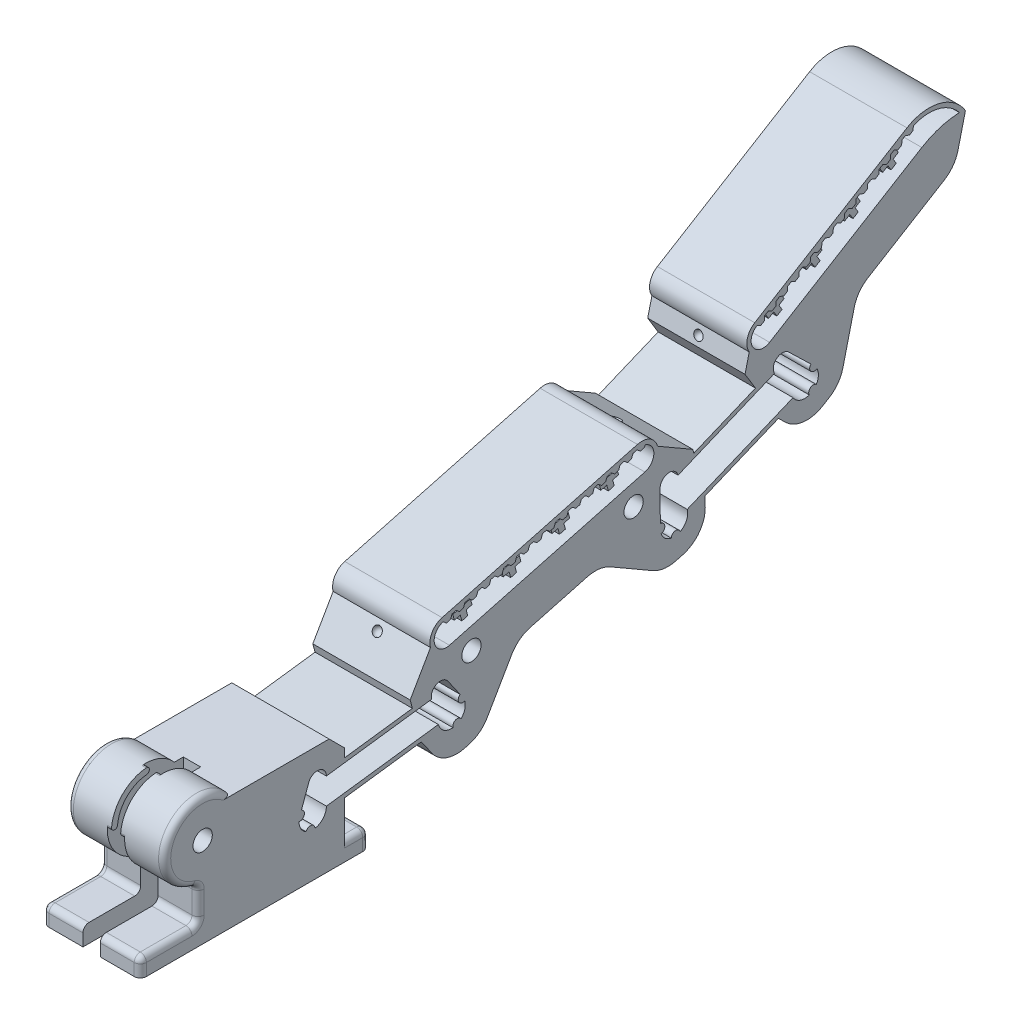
SolidWorks part; units mm, degrees
ref_plane "Front Plane" through (0, 0, 0) normal (0, 0, 1) x (1, 0, 0)
ref_plane "Top Plane" through (0, 0, 0) normal (0, 1, 0) x (1, 0, 0)
ref_plane "Right Plane" through (0, 0, 0) normal (1, 0, 0) x (0, 0, -1)
sketch "Sketch1" plane through (0, 0, 0) normal (0, 0, 1) x (1, 0, 0)
  line L0 (0, 0) -> (0, 9) construction
  line L1 (0, 0) -> (-8, 0) construction
  line L3 (-8, 9) -> (8, 9)
  line L4 (-8, 9) -> (-8, -9)
  line L5 (-8, -9) -> (8, -9)
  line L6 (8, 9) -> (8, -9)
  dimension "D1" = 16
  dimension "D2" = 18
extrude "Base" add sketch "Sketch1" along normal mid plane 29.5715
sketch "Sketch2" plane through (8, 0, 0) normal (1, 0, 0) x (0, 0, -1)
  line L0 (0, 9) -> (0, -9) construction
  line L1 (-14.7858, 9) -> (14.7858, 9) construction
  line L2 (-14.7858, -9) -> (14.7858, -9) construction
  line L3 (-14.7858, -9) -> (-14.7858, 9) construction
  line L4 (-18.7858, -9) -> (18.7858, -9)
  line L5 (-18.7858, -9) -> (-18.7858, -12)
  line L6 (-18.7858, -12) -> (18.7858, -12)
  line L7 (18.7858, -9) -> (18.7858, -12)
  dimension "D1" = 3
  dimension "D2" = 4
extrude "Base Tabs" add sketch "Sketch2" against normal up to surface (16 mm away)
sketch "Sketch3" plane through (8, 0, 0) normal (1, 0, 0) x (0, 0, -1)
  line L0 (0, 0) -> (14.7858, 0) construction
  line L1 (14.7858, -9) -> (14.7858, 9) construction
  line L2 (14.7858, 0) -> (26.6831, 1.5663) construction
  line L3 (26.6831, 1.5663) -> (73.1467, 14.0162) construction
  line L4 (73.1467, 14.0162) -> (84.2332, 18.6084) construction
  line L5 (84.2332, 18.6084) -> (113.331, 36.3123) construction
  line L6 (20.7344, 0.7832) -> (78.69, 16.3123) construction
  line L7 (78.69, 16.3123) -> (113.331, 36.3123) construction
  line L8 (14.7858, 2.8494) -> (25.9456, 4.3186)
  line L9 (14.7858, -2.8494) -> (27.4206, -1.186)
  line L10 (24.3537, 10.2596) -> (29.0125, -7.127) construction
  line L11 (25.9456, 4.3186) -> (24.3537, 10.2596)
  line L12 (24.3537, 10.2596) -> (70.8173, 22.7095)
  line L13 (27.4206, -1.186) -> (29.0125, -7.127)
  line L14 (29.0125, -7.127) -> (75.4761, 5.3229)
  line L15 (70.8173, 22.7095) -> (75.4761, 5.3229) construction
  line L16 (82.348, 21.7069) -> (86.1185, 15.5099) construction
  line L17 (75.4761, 5.3229) -> (74.0823, 10.5244)
  line L18 (72.2111, 17.508) -> (82.348, 21.7069)
  line L19 (70.8173, 22.7095) -> (72.2111, 17.508)
  line L20 (74.0823, 10.5244) -> (86.1185, 15.5099)
  line L21 (82.348, 21.7069) -> (79.5552, 26.2971)
  line L22 (79.5552, 26.2971) -> (108.653, 44.001)
  line L23 (108.653, 44.001) -> (118.009, 28.6236)
  line L24 (118.009, 28.6236) -> (88.9113, 10.9197)
  line L25 (88.9113, 10.9197) -> (86.1185, 15.5099)
  line L26 (14.7858, 2.8494) -> (14.7858, -2.8494)
  point P9 (20.7344, 0.7832)
  point P10 (78.69, 16.3123)
  dimension "D1" = 12
  dimension "D2" = 12
  dimension "D3" = 15
  dimension "D4" = 15
  dimension "D5" = 60
  dimension "D6" = 40
  dimension "D7" = 7.5
  dimension "D8" = 7.5
  dimension "D9" = 5.65
  dimension "D10" = 18
  dimension "D11" = 7.1681
  dimension "D12" = 18
extrude "Finger Frame" add sketch "Sketch3" against normal up to surface (16 mm away)
sketch "Sketch4" plane through (8, 0, 0) normal (1, 0, 0) x (0, 0, -1)
  line L0 (20.3657, 3.584) -> (21.1032, -2.0177) construction
  line L1 (25.9456, 4.3186) -> (14.7858, 2.8494) construction
  line L2 (14.7858, -2.8494) -> (27.4206, -1.186) construction
  line L3 (77.555, 18.9639) -> (79.8249, 13.6607) construction
  line L4 (82.348, 21.7069) -> (72.2111, 17.508) construction
  line L5 (82.7162, 21.1017) -> (85.4879, 22.2498)
  line L6 (82.348, 21.7069) -> (86.1185, 15.5099) construction
  line L7 (72.2111, 17.508) -> (74.0823, 10.5244) construction
  line L8 (14.7858, 2.8494) -> (14.7858, -2.8494) construction
  line L9 (25.9456, 4.3186) -> (27.4206, -1.186) construction
  line L10 (14.7858, 2.1433) -> (26.1284, 3.6366)
  line L11 (14.7858, -2.1433) -> (27.2378, -0.504)
  line L12 (14.7858, 0) -> (26.6831, 1.5663) construction
  line L13 (73.1467, 14.0162) -> (84.2332, 18.6084) construction
  line L14 (72.3938, 16.826) -> (82.7162, 21.1017)
  line L15 (73.8996, 11.2064) -> (85.7503, 16.1151)
  line L16 (14.7858, 2.1433) -> (11.8114, 1.7518)
  line L17 (14.7858, -2.1433) -> (11.8114, -2.5349)
  line L18 (8.9005, 2.2611) -> (7.4451, -1.771)
  line L19 (11.8114, 1.7518) -> (11.8114, -2.5349) construction
  line L20 (31.7826, 5.2735) -> (34.232, 1.7556)
  line L21 (27.2378, -0.504) -> (30.2122, -0.1124)
  line L22 (26.1284, 3.6366) -> (29.1027, 4.0282)
  line L23 (72.3938, 16.826) -> (69.6222, 15.678)
  line L24 (73.8996, 11.2064) -> (71.1279, 10.0583)
  line L25 (66.6733, 15.2817) -> (66.7046, 9.4638)
  line L26 (85.7503, 16.1151) -> (88.5219, 17.2631)
  line L27 (69.6222, 15.678) -> (71.1279, 10.0583) construction
  line L28 (85.4879, 22.2498) -> (88.5219, 17.2631) construction
  line L29 (87.812, 24.1077) -> (92.0082, 20.0501)
  arc A0 (11.8114, 1.7518) -> (8.9005, 2.2611) centre (10.3114, 1.7518) ccw
  arc A1 (11.8114, -2.5349) -> (7.4451, -1.771) centre (9.5614, -2.5349) cw
  arc A2 (29.1027, 4.0282) -> (31.7826, 5.2735) centre (30.5516, 4.4164) cw
  arc A3 (30.2122, -0.1124) -> (34.232, 1.7556) centre (32.3855, 0.4699) ccw
  arc A4 (69.6222, 15.678) -> (66.6733, 15.2817) centre (68.1733, 15.2898) ccw
  arc A5 (71.1279, 10.0583) -> (66.7046, 9.4638) centre (68.9546, 9.476) cw
  arc A6 (85.4879, 22.2498) -> (87.812, 24.1077) centre (86.7693, 23.0294) cw
  arc A7 (88.5219, 17.2631) -> (92.0082, 20.0501) centre (90.4441, 18.4326) ccw
  dimension "D5" = 1.5
  dimension "D6" = 2.25
  dimension "D1" = 0.7
  dimension "D2" = 0.7
  dimension "D3" = 3
extrude "Flexures" cut sketch "Sketch4" against normal through all
sketch "Sketch5" plane through (8, 0, 0) normal (1, 0, 0) x (0, 0, -1)
  line L0 (7.4451, -1.771) -> (11.8114, -2.5349) construction
  line L1 (9.6282, -2.1529) -> (9.1736, -4.7512) construction
  line L3 (20.4571, 2.89) -> (21.0118, -1.3237) construction
  line L4 (29.1027, 4.0282) -> (11.8114, 1.7518) construction
  line L5 (11.8114, -2.5349) -> (30.2122, -0.1124) construction
  line L6 (71.1279, 10.0583) -> (66.7046, 9.4638) construction
  line L7 (88.5219, 17.2631) -> (92.0082, 20.0501) construction
  line L8 (90.265, 18.6566) -> (91.849, 16.6752) construction
  line L9 (68.9163, 9.7611) -> (69.2543, 7.246) construction
  arc A0 (7.4451, -1.771) -> (11.8114, -2.5349) centre (9.5614, -2.5349) ccw construction
  circle A1 centre (9.1736, -4.7512) radius 0.75
  circle A2 centre (7.4451, -1.771) radius 0.75
  circle A3 centre (33.3337, -1.5705) radius 0.75
  circle A4 centre (34.232, 1.7556) radius 0.75
  arc A5 (88.5219, 17.2631) -> (92.0082, 20.0501) centre (90.4441, 18.4326) ccw construction
  arc A6 (66.7046, 9.4638) -> (71.1279, 10.0583) centre (68.9546, 9.476) ccw construction
  circle A7 centre (69.2543, 7.246) radius 0.75
  circle A8 centre (66.7046, 9.4638) radius 0.75
  circle A9 centre (91.849, 16.6752) radius 0.75
  circle A10 centre (92.0082, 20.0501) radius 0.75
  dimension "D1" = 1.5
  dimension "D2" = 1.5
extrude "Flexure Anchors" add sketch "Sketch5" against normal up to surface (16 mm away)
sketch "Sketch6" plane through (8, 0, 0) normal (1, 0, 0) x (0, 0, -1)
  line L0 (25.7513, 5.0436) -> (62.3133, 14.8404) construction
  line L1 (70.8173, 22.7095) -> (24.3537, 10.2596) construction
  line L2 (29.0125, -7.127) -> (75.4761, 5.3229) construction
  line L3 (47.5855, 16.4846) -> (52.2443, -0.9021) construction
  line L4 (25.5772, 5.6935) -> (24.3537, 10.2596)
  line L5 (34.8593, 6.322) -> (20.346, 14.7012) construction
  line L6 (33.8034, 2.3711) -> (31.7826, 5.2735) construction
  line L7 (25.5772, 5.6935) -> (28.9199, 11.4831)
  line L8 (24.3537, 10.2596) -> (25.9456, 4.3186) construction
  line L9 (24.3537, 10.2596) -> (28.9199, 11.4831)
  line L10 (72.0408, 18.1434) -> (70.8173, 22.7095)
  line L11 (70.8173, 22.7095) -> (66.2512, 21.486)
  line L12 (72.0408, 18.1434) -> (66.2512, 21.486)
  line L13 (70.8173, 22.7095) -> (79.5552, 26.2971) construction
  line L14 (75.1863, 24.5033) -> (77.2795, 19.6075) construction
  line L15 (82.348, 21.7069) -> (72.2111, 17.508) construction
  line L16 (79.5552, 26.2971) -> (80.6304, 24.53)
  line L17 (79.5552, 26.2971) -> (82.348, 21.7069) construction
  line L18 (80.6304, 24.53) -> (81.3223, 27.3723)
  line L19 (108.653, 44.001) -> (79.5552, 26.2971) construction
  line L20 (81.3223, 27.3723) -> (79.5552, 26.2971)
  line L21 (-14.7858, -9) -> (-14.7858, 9) construction
  line L22 (-14.7858, 9) -> (14.7858, 9) construction
  line L23 (-14.7858, 2.75) -> (-14.7858, 9)
  line L24 (-14.7858, 9) -> (-8.5358, 9)
  line L25 (20.3657, 3.584) -> (21.0118, -1.3237) construction
  line L26 (25.9456, 4.3186) -> (14.7858, 2.8494) construction
  line L27 (11.8114, -2.5349) -> (30.2122, -0.1124) construction
  line L28 (14.7857, 4.2728) -> (14.7858, 9)
  line L29 (14.7857, 4.2728) -> (10.0585, 9)
  line L30 (14.7858, 9) -> (10.0585, 9)
  line L31 (20.6887, 1.1302) -> (33.4937, 2.816) construction
  line L32 (66.6945, 11.3436) -> (90.7203, 21.2954) construction
  line L33 (66.6733, 15.2817) -> (66.7006, 10.2138) construction
  line L34 (91.469, 20.5714) -> (87.812, 24.1077) construction
  line L35 (71.1279, 10.0583) -> (88.5219, 17.2631) construction
  line L36 (85.4879, 22.2498) -> (69.6222, 15.678) construction
  circle A0 centre (35.653, 7.6968) radius 1.5875
  circle A2 centre (62.3133, 14.8404) radius 1.5875
  circle A3 centre (-8.5358, 2.75) radius 6.25 construction
  circle A4 centre (-8.5358, 2.75) radius 4.75 construction
  circle A5 centre (-8.5358, 2.75) radius 1.5875
  arc A6 (-8.5358, 9) -> (-14.7858, 2.75) centre (-8.5358, 2.75) ccw
  point P73 (28.1699, 10.1841)
  point P77 (80.9675, 25.9148)
  dimension "D1" = 3.175
  dimension "D2" = 8
  dimension "D5" = 12.5
  dimension "D6" = 3.175
  dimension "D7" = 9.5
  dimension "D3" = 45
  dimension "D4" = 1.5
  dimension "D8" = 1.5
  dimension "D9" = 8
  dimension "D10" = 5.4
extrude "Pin Holes" cut sketch "Sketch6" against normal through all
sketch "Sketch8" plane through (0, -9.6519, -16.7176) normal (0, 0.5, 0.866) x (1, 0, 0)
  line L0 (0, 24.4046) -> (0, 17.7193) construction
  line L1 (8, 24.4046) -> (-8, 24.4046) construction
  line L2 (-8, 17.7193) -> (8, 17.7193) construction
  circle A0 centre (0, 22.9046) radius 0.75
  dimension "D1" = 1.5
  dimension "D2" = 1.5
extrude "Tendon Route 1" cut sketch "Sketch8" against normal blind 0.75
sketch "Sketch9" plane through (0, -17.1586, -70.4813) normal (0, 0.2365, 0.9716) x (1, 0, 0)
  line L0 (0, 45.8315) -> (0, 42.9062) construction
  line L1 (8, 45.8315) -> (-8, 45.8315) construction
  line L2 (-8, 42.9062) -> (8, 42.9062) construction
  circle A0 centre (0, 44.3315) radius 0.75
  dimension "D1" = 1.5
  dimension "D2" = 1.5
extrude "Tendon Route 2" cut sketch "Sketch9" against normal blind 0.75
sketch "Sketch10" plane through (0, 44.8021, -25.8665) normal (0, 0.866, -0.5) x (1, 0, 0)
  line L0 (0, 46.6322) -> (0, 53.3175) construction
  line L1 (-8, 46.6322) -> (8, 46.6322) construction
  line L2 (8, 53.3175) -> (-8, 53.3175) construction
  circle A0 centre (0, 48.1322) radius 0.75
  dimension "D1" = 1.5
  dimension "D2" = 1.5
extrude "Tendon Route 3" cut sketch "Sketch10" against normal blind 0.75
sketch "Sketch11" plane through (8, 0, 0) normal (1, 0, 0) x (0, 0, -1)
  line L0 (-3.7755, 6.8) -> (-8.5358, 6.8) construction
  line L1 (14.7858, 9) -> (-8.5357, 9)
  line L2 (14.7858, 9) -> (14.7858, 6.8)
  line L3 (14.7858, 6.8) -> (-3.7755, 6.8)
  line L5 (14.7858, 2.8494) -> (14.7857, 4.2728) construction
  line L6 (-8.5358, 9) -> (10.0585, 9) construction
  circle A0 centre (-8.5358, 2.75) radius 4.75 construction
  circle A1 centre (-8.5358, 2.75) radius 4.05 construction
  arc A2 (-8.5357, 9) -> (-3.7755, 6.8) centre (-8.5358, 2.75) cw
  dimension "D1" = 9.5
  dimension "D2" = 0.7
extrude "Tendon Clearance" cut sketch "Sketch11" against normal through all
fillet "Tendon Route Ports" radius 0.75 3 edges at (0, 20.4615, -66.5257) (0, 25.0087, -81.5188) (0, 9.1596, -28.4444)
sketch "Sketch13" plane through (8, 0, 0) normal (1, 0, 0) x (0, 0, -1)
  line L0 (30.8291, 14.79) -> (62.9444, 23.3952)
  line L1 (66.2512, 21.486) -> (28.9199, 11.4831) construction
  line L2 (28.9199, 11.4831) -> (66.2512, 21.486)
  line L3 (82.2255, 31.0823) -> (107.2496, 46.3076)
  line L4 (108.653, 44.001) -> (81.3223, 27.3723) construction
  line L5 (30.8291, 14.79) -> (31.5279, 12.182) construction
  line L6 (82.2255, 31.0823) -> (83.629, 28.7757) construction
  line L7 (118.009, 28.6236) -> (108.653, 44.001) construction
  line L8 (81.3223, 27.3723) -> (108.653, 44.001)
  line L9 (108.653, 44.001) -> (114.5265, 34.3474)
  arc A0 (28.9199, 11.4831) -> (30.8291, 14.79) centre (31.5279, 12.182) cw
  arc A1 (66.2512, 21.486) -> (62.9444, 23.3952) centre (63.6432, 20.7872) ccw
  arc A2 (81.3223, 27.3723) -> (82.2255, 31.0823) centre (83.629, 28.7757) cw
  arc A3 (107.2496, 46.3076) -> (114.5265, 34.3474) centre (110.888, 40.3275) cw
  dimension "D2" = 7
  dimension "D1" = 2.7
extrude "Finger Pad Outline" add sketch "Sketch13" against normal up to surface (16 mm away)
sketch "Sketch12" plane through (8, 0, 0) normal (1, 0, 0) x (0, 0, -1)
  line L0 (27.4206, -1.186) -> (31.157, -6.5524)
  line L1 (29.0125, -7.127) -> (75.4761, 5.3229) construction
  line L2 (74.0823, 10.5244) -> (74.1123, 4.9575)
  line L3 (86.1185, 15.5099) -> (90.1106, 11.6494)
  line L4 (88.9113, 10.9197) -> (118.009, 28.6236) construction
  line L5 (91.469, 20.5714) -> (87.812, 24.1077) construction
  line L6 (66.6733, 15.2817) -> (66.7006, 10.2138) construction
  line L7 (33.8034, 2.3711) -> (31.7826, 5.2735) construction
  line L8 (27.4206, -1.186) -> (29.0125, -7.127)
  line L9 (29.0125, -7.127) -> (31.157, -6.5524)
  line L10 (74.0823, 10.5244) -> (75.4761, 5.3229)
  line L11 (75.4761, 5.3229) -> (74.1123, 4.9575)
  line L12 (86.1185, 15.5099) -> (88.9113, 10.9197)
  line L13 (88.9113, 10.9197) -> (90.1106, 11.6494)
  line L14 (29.1027, 4.0282) -> (30.2122, -0.1124) construction
  line L15 (69.6222, 15.678) -> (71.1279, 10.0583) construction
  line L16 (29.6574, 1.9579) -> (70.3751, 12.8681) construction
  line L17 (62.9444, 23.3952) -> (30.8291, 14.79) construction
  line L18 (56.7226, 9.21) -> (70.3751, 12.8681) construction
  line L19 (46.8867, 19.0926) -> (52.2443, -0.9021) construction
  line L20 (87.0049, 19.7565) -> (99.0796, 27.1031) construction
  line L21 (96.2228, 15.3682) -> (99.0796, 27.1031)
  line L22 (37.2228, -4.9271) -> (43.3099, 5.6161)
  line L23 (25.5772, 5.6935) -> (28.9199, 11.4831) construction
  line L24 (43.3099, 5.6161) -> (56.7226, 9.21)
  line L25 (37.2228, -4.9271) -> (67.2657, 3.1229)
  line L26 (67.2657, 3.1229) -> (56.7226, 9.21)
  line L27 (31.157, -6.5524) -> (37.2228, -4.9271) construction
  line L28 (99.0796, 27.1031) -> (115.142, 36.8759)
  line L29 (116.8681, 43.966) -> (123.9891, 32.2621)
  line L30 (123.9891, 32.2621) -> (96.2228, 15.3682)
  line L31 (115.142, 36.8759) -> (116.8681, 43.966)
  line L32 (80.6304, 24.53) -> (81.3223, 27.3723) construction
  line L33 (85.4879, 22.2498) -> (88.5219, 17.2631) construction
  line L34 (87.0049, 19.7565) -> (119.5501, 39.5579) construction
  arc A1 (114.5265, 34.3474) -> (107.2496, 46.3076) centre (110.888, 40.3275) ccw construction
  point P51 (50.0162, 7.413)
  dimension "D1" = 8.5
extrude "Finger Outline" cut sketch "Sketch12" against normal through all
sketch "Sketch14" plane through (8, 0, 0) normal (1, 0, 0) x (0, 0, -1)
  line L0 (30.8291, 14.79) -> (31.5279, 12.182) construction
  line L1 (46.8867, 19.0926) -> (50.0162, 7.413) construction
  line L2 (62.9444, 23.3952) -> (30.8291, 14.79) construction
  line L3 (56.7226, 9.21) -> (43.3099, 5.6161) construction
  line L4 (62.9444, 23.3952) -> (63.6432, 20.7872) construction
  line L5 (31.0102, 14.1138) -> (63.1255, 22.7191)
  line L6 (32.0455, 10.2501) -> (64.1608, 18.8554)
  line L7 (107.2496, 46.3076) -> (109.6925, 42.2924) construction
  line L8 (116.8681, 43.966) -> (89.6849, 27.4269) construction
  line L9 (107.2496, 46.3076) -> (82.2255, 31.0823) construction
  line L10 (82.5894, 30.4843) -> (107.6134, 45.7096)
  line L11 (84.6685, 27.0671) -> (109.6925, 42.2924)
  circle A0 centre (31.5279, 12.182) radius 2 construction
  arc A1 (30.8291, 14.79) -> (28.9199, 11.4831) centre (31.5279, 12.182) ccw construction
  circle A2 centre (63.6432, 20.7872) radius 2 construction
  arc A3 (31.0102, 14.1138) -> (32.0455, 10.2501) centre (31.5279, 12.182) ccw
  arc A4 (63.1255, 22.7191) -> (64.1608, 18.8554) centre (63.6432, 20.7872) cw
  circle A5 centre (83.629, 28.7757) radius 2 construction
  arc A6 (82.2255, 31.0823) -> (81.3223, 27.3723) centre (83.629, 28.7757) ccw construction
  arc A7 (82.5894, 30.4843) -> (84.6685, 27.0671) centre (83.629, 28.7757) ccw
  arc A8 (107.6134, 45.7096) -> (115.8729, 44.1799) centre (110.888, 40.3275) cw
  arc A9 (109.6925, 42.2924) -> (115.8729, 44.1799) centre (116.4757, 31.1438) cw
  dimension "D1" = 0.7
  dimension "D2" = 0.7
  dimension "D3" = 0.7
extrude "Finger Pad Cavity" cut sketch "Sketch14" against normal through all and the other way through all contours A4 L5 A3 L6 | L11 A9 A8 L10 A7
sketch "Sketch15" plane through (0, 0, 0) normal (1, 0, 0) x (0, 0, -1)
  line L0 (35.061, 9.9063) -> (61.7212, 17.0499)
  line L1 (71.1279, 10.0583) -> (69.6222, 15.678) construction
  line L2 (33.7792, 6.3847) -> (39.2461, -1.4227)
  line L3 (43.3099, 5.6161) -> (37.2228, -4.9271) construction
  line L5 (48.3911, 13.4781) -> (54.6807, -9.9949) construction
  line L6 (64.5921, 14.641) -> (63.7614, 5.1461)
  line L7 (39.2461, -1.4227) -> (63.7614, 5.1461)
  line L8 (90.0421, 24.9873) -> (97.1743, 19.2768)
  line L9 (90.2828, 28.7271) -> (111.3723, 41.5586)
  line L10 (111.3723, 41.5586) -> (121.0547, 33.8063)
  line L11 (121.0547, 33.8063) -> (97.1743, 19.2768)
  line L12 (99.0796, 27.1031) -> (96.2228, 15.3682) construction
  line L13 (109.6925, 42.2924) -> (84.6685, 27.0671) construction
  line L14 (85.4879, 22.2498) -> (88.5219, 17.2631) construction
  line L17 (70.3751, 12.8681) -> (87.0049, 19.7565) construction
  line L18 (70.3751, 12.8681) -> (64.5921, 14.641) construction
  line L19 (87.0049, 19.7565) -> (90.0421, 24.9873) construction
  circle A0 centre (35.653, 7.6968) radius 2.2875 construction
  circle A1 centre (62.3133, 14.8404) radius 2.2875 construction
  circle A2 centre (35.653, 7.6968) radius 1.5875 construction
  arc A3 (35.061, 9.9063) -> (33.7792, 6.3847) centre (35.653, 7.6968) ccw
  arc A4 (61.7212, 17.0499) -> (64.5921, 14.641) centre (62.3133, 14.8404) cw
  arc A5 (90.2828, 28.7271) -> (90.0421, 24.9873) centre (91.4718, 26.7729) ccw
  dimension "D1" = 0.7
  dimension "D2" = 1.5
  dimension "D3" = 70
  dimension "D4" = 6
  dimension "D5" = 70
extrude "Back Cutaway" cut sketch "Sketch15" against normal mid plane 10
sketch "Sketch7" plane through (0, -12, 0) normal (0, 1, 0) x (1, 0, 0)
  line L0 (0, 0) -> (0, -8.5358) construction
  line L1 (8, -10.1233) -> (8, -6.9482) construction
  line L4 (-1.2, -2.2857) -> (1.2, -2.2857)
  line L5 (-1.2, -2.2857) -> (-1.2, -18.7858)
  line L6 (-1.2, -18.7858) -> (1.2, -18.7858)
  line L7 (1.2, -2.2857) -> (1.2, -18.7858)
  line L8 (0, -8.5358) -> (8, -8.5358) construction
  dimension "D1" = 2.4
  dimension "D2" = 6.25
  dimension "D3" = 10.25
extrude "Pulley Clearance" cut sketch "Sketch7" along normal through all contours L4 L7 L5 M13
sketch "Sketch16" plane through (8, 0, 0) normal (1, 0, 0) x (0, 0, -1)
  line L0 (-14.7858, 2.75) -> (-8.5358, 2.75) construction
  line L1 (-8.5358, 2.75) -> (-8.5358, 9) construction
  line L2 (-14.7858, 2.75) -> (-13.7858, 2.75)
  line L3 (-8.5358, 9) -> (-8.5357, 8)
  arc A0 (-14.7858, 2.75) -> (-8.5358, 9) centre (-8.5358, 2.75) cw
  arc A1 (-3.7755, 6.8) -> (-14.7858, 2.75) centre (-8.5358, 2.75) ccw construction
  arc A2 (-8.5357, 8) -> (-13.7858, 2.75) centre (-8.5358, 2.75) ccw
  dimension "D1" = 1
extrude "Pulley Cover" add sketch "Sketch16" against normal up to surface (16 mm away)
sketch "Sketch17" plane through (0, -12, 0) normal (0, -1, 0) x (1, 0, 0)
  line L0 (-1.2, 18.7858) -> (1.2, 18.7858) construction
  line L1 (0, 18.7858) -> (0, 2.2857) construction
  line L2 (-1.2, 2.2857) -> (1.2, 2.2857) construction
  line L4 (-0.75, 18.7858) -> (0.75, 18.7858)
  line L5 (-0.75, 18.7858) -> (-0.75, 2.2857)
  line L6 (-0.75, 2.2857) -> (0.75, 2.2857)
  line L7 (0.75, 18.7858) -> (0.75, 2.2857)
  dimension "D1" = 1.5
extrude "Pulley Cover Cutaway" cut sketch "Sketch17" against normal through all
sketch "Sketch23" plane through (8, 0, 0) normal (1, 0, 0) x (0, 0, -1)
  line L0 (-9.2858, -3.4548) -> (-9.2858, -9)
  line L1 (-9.2858, -9) -> (-14.7858, -9)
  line L2 (-14.7858, -9) -> (-18.7858, -9) construction
  line L3 (-14.7858, -9) -> (-14.7858, 2.75)
  arc A0 (-14.7858, 2.75) -> (-9.2858, -3.4548) centre (-8.5358, 2.75) ccw
  circle A1 centre (-8.5358, 2.75) radius 4.75 construction
  dimension "D1" = 9.5
  dimension "D2" = 5.5
extrude "Insertion Allowance" cut sketch "Sketch23" against normal through all and the other way through all
sketch "Sketch25" plane through (0, 0, 0) normal (1, 0, 0) x (0, 0, -1)
  line L0 (-18.7858, -9) -> (-9.2858, -9) construction
  line L1 (-9.2858, -3.4548) -> (-9.2858, -9) construction
  line L2 (-18.7858, -9) -> (-18.7858, -12) construction
  line L3 (-2.2857, -12) -> (-18.7858, -12) construction
  line L4 (-2.2858, 6.8) -> (-2.2857, -12) construction
  line L5 (-2.2858, 6.8) -> (-3.7755, 6.8) construction
  line L6 (-14.7858, 2.75) -> (-13.7858, 2.75) construction
  line L7 (-8.5358, 8) -> (-8.5358, 9) construction
  line L8 (-18.7858, -9) -> (-9.2858, -9)
  line L9 (-9.2858, -3.4548) -> (-9.2858, -9)
  line L10 (-18.7858, -9) -> (-18.7858, -12)
  line L11 (-2.2857, -12) -> (-18.7858, -12)
  line L12 (-2.2858, 6.8) -> (-2.2857, -12)
  line L13 (-2.2858, 6.8) -> (-3.7755, 6.8)
  line L14 (-14.7858, 2.75) -> (-13.7858, 2.75)
  line L15 (-8.5358, 8) -> (-8.5358, 9)
  arc A0 (-14.7858, 2.75) -> (-9.2858, -3.4548) centre (-8.5358, 2.75) ccw construction
  arc A1 (-3.7755, 6.8) -> (-8.5358, 9) centre (-8.5358, 2.75) ccw construction
  arc A2 (-8.5358, 8) -> (-13.7858, 2.75) centre (-8.5358, 2.75) ccw construction
  arc A3 (-14.7858, 2.75) -> (-9.2858, -3.4548) centre (-8.5358, 2.75) ccw
  arc A4 (-3.7755, 6.8) -> (-8.5358, 9) centre (-8.5358, 2.75) ccw
  arc A5 (-8.5358, 8) -> (-13.7858, 2.75) centre (-8.5358, 2.75) ccw
extrude "Print Pulley Clearance" cut sketch "Sketch25" against normal mid plane 2.85
sketch "Sketch18" plane through (0, 0, 0) normal (1, 0, 0) x (0, 0, -1)
  line L0 (64.1608, 18.8554) -> (32.0455, 10.2501) construction
  line L1 (64.1608, 18.8554) -> (32.0455, 10.2501) construction
  line L2 (63.1255, 22.7191) -> (31.0102, 14.1138) construction
  line L3 (63.1255, 22.7191) -> (31.0102, 14.1138) construction
  line L4 (47.0679, 18.4164) -> (48.1032, 14.5527) construction
  line L5 (35.8011, 12.2917) -> (35.5423, 13.2576) construction
  line L6 (31.0102, 14.1138) -> (32.0455, 10.2501) construction
  line L7 (31.5279, 12.182) -> (47.5855, 16.4846) construction
  line L8 (39.5567, 14.3333) -> (40.0743, 12.4014) construction
  line L9 (34.0934, 12.8694) -> (34.3522, 11.9035)
  line L10 (34.3522, 11.9035) -> (35.3181, 12.1623)
  line L11 (35.3181, 12.1623) -> (35.577, 11.1964)
  line L12 (35.577, 11.1964) -> (36.5429, 11.4552)
  line L13 (42.381, 14.0548) -> (42.1222, 15.0207)
  line L14 (36.5429, 11.4552) -> (36.2841, 12.4211)
  line L15 (36.2841, 12.4211) -> (37.25, 12.6799)
  line L16 (37.25, 12.6799) -> (36.9912, 13.6458)
  line L17 (36.9912, 13.6458) -> (34.0934, 12.8694)
  line L18 (39.8155, 13.3673) -> (31.7867, 11.216) construction
  line L19 (43.347, 14.3136) -> (42.381, 14.0548)
  line L20 (43.6058, 13.3477) -> (43.347, 14.3136)
  line L21 (44.5717, 13.6065) -> (43.6058, 13.3477)
  line L22 (44.3129, 14.5724) -> (44.5717, 13.6065)
  line L23 (45.2788, 14.8312) -> (44.3129, 14.5724)
  line L24 (45.02, 15.7972) -> (45.2788, 14.8312)
  line L25 (42.1222, 15.0207) -> (45.02, 15.7972)
  line L26 (50.4099, 16.2061) -> (51.3758, 16.4649)
  line L27 (51.3758, 16.4649) -> (51.6346, 15.499)
  line L28 (51.6346, 15.499) -> (52.6005, 15.7578)
  line L29 (52.6005, 15.7578) -> (52.3417, 16.7237)
  line L30 (52.3417, 16.7237) -> (53.3076, 16.9826)
  line L31 (50.151, 17.172) -> (50.4099, 16.2061)
  line L32 (53.0488, 17.9485) -> (50.151, 17.172)
  line L33 (53.3076, 16.9826) -> (53.0488, 17.9485)
  line L34 (60.6294, 17.9091) -> (59.6634, 17.6503)
  line L35 (59.4046, 18.6162) -> (58.4387, 18.3574)
  line L36 (59.6634, 17.6503) -> (59.4046, 18.6162)
  line L37 (60.3705, 18.875) -> (60.6294, 17.9091)
  line L38 (61.3365, 19.1339) -> (60.3705, 18.875)
  line L39 (58.4387, 18.3574) -> (58.1799, 19.3233)
  line L40 (58.1799, 19.3233) -> (61.0776, 20.0998)
  line L41 (61.0776, 20.0998) -> (61.3365, 19.1339)
  line L42 (109.6925, 42.2924) -> (84.6685, 27.0671) construction
  line L43 (107.6134, 45.7096) -> (82.5894, 30.4843) construction
  line L44 (109.6925, 42.2924) -> (84.6685, 27.0671) construction
  line L45 (107.6134, 45.7096) -> (82.5894, 30.4843) construction
  line L46 (82.5894, 30.4843) -> (84.6685, 27.0671) construction
  line L47 (95.1014, 38.0969) -> (97.1805, 34.6797) construction
  line L48 (83.629, 28.7757) -> (96.141, 36.3883) construction
  line L49 (89.885, 32.582) -> (90.9245, 30.8734) construction
  line L50 (90.4047, 31.7277) -> (84.1487, 27.9214) construction
  line L51 (87.2767, 29.8245) -> (86.757, 30.6788) construction
  line L54 (85.4755, 29.8992) -> (88.0384, 31.4585)
  line L55 (88.0384, 31.4585) -> (88.5582, 30.6042)
  line L56 (88.5582, 30.6042) -> (87.7039, 30.0844)
  line L57 (87.7039, 30.0844) -> (88.2237, 29.2301)
  line L58 (88.2237, 29.2301) -> (87.3694, 28.7104)
  line L59 (87.3694, 28.7104) -> (86.8496, 29.5647)
  line L60 (86.8496, 29.5647) -> (85.9953, 29.0449)
  line L61 (85.9953, 29.0449) -> (85.4755, 29.8992)
  line L62 (92.2513, 32.8512) -> (93.1056, 33.371)
  line L63 (93.1056, 33.371) -> (93.6254, 32.5167)
  line L64 (93.6254, 32.5167) -> (94.4797, 33.0365)
  line L65 (94.4797, 33.0365) -> (93.9599, 33.8908)
  line L66 (93.9599, 33.8908) -> (94.8142, 34.4105)
  line L67 (91.7315, 33.7055) -> (92.2513, 32.8512)
  line L68 (94.2944, 35.2648) -> (91.7315, 33.7055)
  line L69 (94.8142, 34.4105) -> (94.2944, 35.2648)
  line L70 (104.2435, 41.3182) -> (104.7633, 40.4639)
  line L71 (104.7633, 40.4639) -> (105.6176, 40.9836)
  line L72 (105.6176, 40.9836) -> (106.1374, 40.1293)
  line L73 (106.1374, 40.1293) -> (106.9917, 40.6491)
  line L74 (106.9917, 40.6491) -> (106.4719, 41.5034)
  line L75 (106.4719, 41.5034) -> (107.3262, 42.0232)
  line L76 (107.3262, 42.0232) -> (106.8064, 42.8775)
  line L77 (106.8064, 42.8775) -> (104.2435, 41.3182)
  line L78 (98.5073, 36.6575) -> (97.9875, 37.5118)
  line L79 (99.3616, 37.1773) -> (98.5073, 36.6575)
  line L80 (99.8814, 36.323) -> (99.3616, 37.1773)
  line L81 (100.7357, 36.8428) -> (99.8814, 36.323)
  line L82 (100.2159, 37.6971) -> (100.7357, 36.8428)
  line L83 (101.0702, 38.2169) -> (100.2159, 37.6971)
  line L84 (100.5504, 39.0712) -> (101.0702, 38.2169)
  line L85 (97.9875, 37.5118) -> (100.5504, 39.0712)
extrude "Pad Hooks" add sketch "Sketch18" along normal mid plane 13
sketch "Sketch19" plane through (8, 0, 0) normal (1, 0, 0) x (0, 0, -1)
  line L0 (30.8291, 14.79) -> (31.0102, 14.1138) construction
  line L1 (31.0102, 14.1138) -> (31.5453, 13.6625)
  line L2 (31.5453, 13.6625) -> (32.2214, 13.8436)
  line L3 (85.7503, 32.4075) -> (84.4689, 31.6278)
  line L4 (32.2214, 13.8436) -> (32.4591, 14.502)
  line L5 (63.1255, 22.7191) -> (31.0102, 14.1138) construction
  line L6 (32.4591, 14.502) -> (31.0102, 14.1138)
  line L7 (34.5841, 15.0714) -> (33.1353, 14.6832)
  line L8 (33.1353, 14.6832) -> (33.6703, 14.2319)
  line L9 (33.6703, 14.2319) -> (34.3465, 14.413)
  line L10 (34.3465, 14.413) -> (34.5841, 15.0714)
  line L11 (36.7092, 15.6408) -> (35.2603, 15.2526)
  line L12 (35.2603, 15.2526) -> (35.7953, 14.8013)
  line L13 (35.7953, 14.8013) -> (36.4715, 14.9824)
  line L14 (36.4715, 14.9824) -> (36.7092, 15.6408)
  line L15 (38.8342, 16.2102) -> (37.3853, 15.822)
  line L16 (37.3853, 15.822) -> (37.9204, 15.3707)
  line L17 (37.9204, 15.3707) -> (38.5965, 15.5518)
  line L18 (38.5965, 15.5518) -> (38.8342, 16.2102)
  line L19 (40.9593, 16.7796) -> (39.5104, 16.3914)
  line L20 (39.5104, 16.3914) -> (40.0454, 15.9401)
  line L21 (40.0454, 15.9401) -> (40.7216, 16.1212)
  line L22 (40.7216, 16.1212) -> (40.9593, 16.7796)
  line L23 (43.0843, 17.349) -> (41.6354, 16.9608)
  line L24 (41.6354, 16.9608) -> (42.1705, 16.5095)
  line L25 (42.1705, 16.5095) -> (42.8466, 16.6906)
  line L26 (42.8466, 16.6906) -> (43.0843, 17.349)
  line L27 (45.2093, 17.9184) -> (43.7604, 17.5302)
  line L28 (43.7604, 17.5302) -> (44.2955, 17.0789)
  line L29 (44.2955, 17.0789) -> (44.9716, 17.26)
  line L30 (44.9716, 17.26) -> (45.2093, 17.9184)
  line L31 (47.3344, 18.4878) -> (45.8855, 18.0996)
  line L32 (45.8855, 18.0996) -> (46.4205, 17.6483)
  line L33 (46.4205, 17.6483) -> (47.0967, 17.8294)
  line L34 (47.0967, 17.8294) -> (47.3344, 18.4878)
  line L35 (49.4594, 19.0572) -> (48.0105, 18.669)
  line L36 (48.0105, 18.669) -> (48.5456, 18.2177)
  line L37 (48.5456, 18.2177) -> (49.2217, 18.3988)
  line L38 (49.2217, 18.3988) -> (49.4594, 19.0572)
  line L39 (51.5844, 19.6267) -> (50.1356, 19.2384)
  line L40 (50.1356, 19.2384) -> (50.6706, 18.7871)
  line L41 (50.6706, 18.7871) -> (51.3468, 18.9682)
  line L42 (51.3468, 18.9682) -> (51.5844, 19.6267)
  line L43 (53.7095, 20.1961) -> (52.2606, 19.8078)
  line L44 (52.2606, 19.8078) -> (52.7956, 19.3565)
  line L45 (52.7956, 19.3565) -> (53.4718, 19.5376)
  line L46 (53.4718, 19.5376) -> (53.7095, 20.1961)
  line L47 (55.8345, 20.7655) -> (54.3856, 20.3772)
  line L48 (54.3856, 20.3772) -> (54.9207, 19.9259)
  line L49 (54.9207, 19.9259) -> (55.5968, 20.107)
  line L50 (55.5968, 20.107) -> (55.8345, 20.7655)
  line L51 (57.9596, 21.3349) -> (56.5107, 20.9466)
  line L52 (56.5107, 20.9466) -> (57.0457, 20.4953)
  line L53 (57.0457, 20.4953) -> (57.7219, 20.6764)
  line L54 (57.7219, 20.6764) -> (57.9596, 21.3349)
  line L55 (60.0846, 21.9043) -> (58.6357, 21.516)
  line L56 (58.6357, 21.516) -> (59.1708, 21.0647)
  line L57 (59.1708, 21.0647) -> (59.8469, 21.2458)
  line L58 (59.8469, 21.2458) -> (60.0846, 21.9043)
  line L59 (62.2096, 22.4737) -> (60.7607, 22.0854)
  line L60 (60.7607, 22.0854) -> (61.2958, 21.6341)
  line L61 (61.2958, 21.6341) -> (61.9719, 21.8153)
  line L62 (61.9719, 21.8153) -> (62.2096, 22.4737)
  line L63 (64.3347, 23.0431) -> (62.8858, 22.6548)
  line L64 (62.8858, 22.6548) -> (63.4208, 22.2035)
  line L65 (63.4208, 22.2035) -> (64.097, 22.3847)
  line L66 (64.097, 22.3847) -> (64.3347, 23.0431)
  line L67 (82.2255, 31.0823) -> (82.5894, 30.4843) construction
  line L68 (82.5894, 30.4843) -> (83.2297, 30.2014)
  line L69 (83.2297, 30.2014) -> (83.8277, 30.5653)
  line L70 (83.8277, 30.5653) -> (83.8708, 31.2639)
  line L71 (107.6134, 45.7096) -> (82.5894, 30.4843) construction
  line L72 (83.8708, 31.2639) -> (82.5894, 30.4843)
  line L73 (84.4689, 31.6278) -> (85.1092, 31.3449)
  line L74 (85.1092, 31.3449) -> (85.7072, 31.7088)
  line L75 (85.7072, 31.7088) -> (85.7503, 32.4075)
  line L76 (87.6298, 33.551) -> (86.3483, 32.7713)
  line L77 (86.3483, 32.7713) -> (86.9886, 32.4885)
  line L78 (86.9886, 32.4885) -> (87.5866, 32.8523)
  line L79 (87.5866, 32.8523) -> (87.6298, 33.551)
  line L80 (89.5092, 34.6945) -> (88.2278, 33.9148)
  line L81 (88.2278, 33.9148) -> (88.8681, 33.632)
  line L82 (88.8681, 33.632) -> (89.4661, 33.9958)
  line L83 (89.4661, 33.9958) -> (89.5092, 34.6945)
  line L84 (91.3887, 35.838) -> (90.1072, 35.0583)
  line L85 (90.1072, 35.0583) -> (90.7475, 34.7755)
  line L86 (90.7475, 34.7755) -> (91.3456, 35.1393)
  line L87 (91.3456, 35.1393) -> (91.3887, 35.838)
  line L88 (93.2681, 36.9815) -> (91.9867, 36.2019)
  line L89 (91.9867, 36.2019) -> (92.627, 35.919)
  line L90 (92.627, 35.919) -> (93.225, 36.2829)
  line L91 (93.225, 36.2829) -> (93.2681, 36.9815)
  line L92 (95.1476, 38.125) -> (93.8662, 37.3454)
  line L93 (93.8662, 37.3454) -> (94.5065, 37.0625)
  line L94 (94.5065, 37.0625) -> (95.1045, 37.4264)
  line L95 (95.1045, 37.4264) -> (95.1476, 38.125)
  line L96 (97.0271, 39.2686) -> (95.7456, 38.4889)
  line L97 (95.7456, 38.4889) -> (96.3859, 38.2061)
  line L98 (96.3859, 38.2061) -> (96.9839, 38.5699)
  line L99 (96.9839, 38.5699) -> (97.0271, 39.2686)
  line L100 (98.9065, 40.4121) -> (97.6251, 39.6324)
  line L101 (97.6251, 39.6324) -> (98.2654, 39.3496)
  line L102 (98.2654, 39.3496) -> (98.8634, 39.7134)
  line L103 (98.8634, 39.7134) -> (98.9065, 40.4121)
  line L104 (100.786, 41.5556) -> (99.5045, 40.7759)
  line L105 (99.5045, 40.7759) -> (100.1448, 40.4931)
  line L106 (100.1448, 40.4931) -> (100.7429, 40.8569)
  line L107 (100.7429, 40.8569) -> (100.786, 41.5556)
  line L108 (102.6654, 42.6991) -> (101.384, 41.9194)
  line L109 (101.384, 41.9194) -> (102.0243, 41.6366)
  line L110 (102.0243, 41.6366) -> (102.6223, 42.0004)
  line L111 (102.6223, 42.0004) -> (102.6654, 42.6991)
  line L112 (104.5449, 43.8426) -> (103.2635, 43.063)
  line L113 (103.2635, 43.063) -> (103.9038, 42.7801)
  line L114 (103.9038, 42.7801) -> (104.5018, 43.144)
  line L115 (104.5018, 43.144) -> (104.5449, 43.8426)
  line L116 (106.4244, 44.9862) -> (105.1429, 44.2065)
  line L117 (105.1429, 44.2065) -> (105.7832, 43.9236)
  line L118 (105.7832, 43.9236) -> (106.3812, 44.2875)
  line L119 (106.3812, 44.2875) -> (106.4244, 44.9862)
  line L120 (108.3038, 46.1297) -> (107.0224, 45.35)
  line L121 (107.0224, 45.35) -> (107.6627, 45.0672)
  line L122 (107.6627, 45.0672) -> (108.2607, 45.431)
  line L123 (108.2607, 45.431) -> (108.3038, 46.1297)
  dimension "D1" = 1.5
  dimension "D3" = 0.7
  dimension "D2" = 0.7
  dimension "D4" = 1.5
  dimension "D5" = 16
  dimension "D6" = 14
extrude "Ridges" add sketch "Sketch19" against normal up to surface (16 mm away)
fillet "Base Contouring" radius 1 19 edges at (8, -6.2274, 9.2858) (-8, -6.2274, 9.2858) (-8, 5.7083, 14.0413) (8, 5.7083, 14.0413) (4.7125, -9, 9.2858) (-4.7125, -9, 9.2858) (-4.7125, -9, 18.7858) (4.7125, -9, 18.7858) (0, -9, -18.7858) (-4.7125, -3.4548, 9.2858) (4.7125, -3.4548, 9.2858) (-8, -10.5, -18.7858) (8, -10.5, -18.7858) (8, -10.5, 18.7858) (-8, -10.5, 18.7858)
fillet "Contouring" radius 5 14 edges at (6.5, 9.21, -56.7226) (-6.5, 9.21, -56.7226) (-6.5, 5.6161, -43.3099) (6.5, 5.6161, -43.3099) (0, -4.9271, -37.2228) (0, 3.1229, -67.2657) (0, 15.3682, -96.2228) (0, 11.6494, -90.1106) (0, 4.9575, -74.1123) (0, -6.5524, -31.157) (0, 41.5586, -111.3723) (6.5, 36.8759, -115.142) (-6.5, 27.1031, -99.0796) (6.5, 27.1031, -99.0796)
fillet "Pulley Cover Fillet" radius 0.5 8 edges at (-1.0875, 8, 8.5358) (-1.0875, 9, 8.5358) (1.0875, 9, 8.5358) (1.0875, 8, 8.5358) (1.0875, 2.75, 13.7858) (1.0875, 2.75, 14.7858) (-1.0875, 2.75, 13.7858) (-1.0875, 2.75, 14.7858)
sketch "Sketch20" plane through (8, 0, 0) normal (1, 0, 0) x (0, 0, -1)
  line L0 (8.9005, 2.2611) -> (7.6997, -1.0655) construction
  line L1 (29.1027, 4.0282) -> (11.8114, 1.7518) construction
  line L2 (11.8114, -2.5349) -> (30.2122, -0.1124) construction
  line L3 (33.8034, 2.3711) -> (31.7826, 5.2735) construction
  line L4 (66.6733, 15.2817) -> (66.7006, 10.2138) construction
  line L5 (85.4879, 22.2498) -> (69.6222, 15.678) construction
  line L6 (71.1279, 10.0583) -> (88.5219, 17.2631) construction
  line L7 (91.469, 20.5714) -> (87.812, 24.1077) construction
  line L8 (8.9005, 2.2611) -> (7.6997, -1.0655)
  line L9 (29.1027, 4.0282) -> (11.8114, 1.7518)
  line L10 (11.8114, -2.5349) -> (30.2122, -0.1124)
  line L11 (33.8034, 2.3711) -> (31.7826, 5.2735)
  line L12 (66.6733, 15.2817) -> (66.7006, 10.2138)
  line L13 (85.4879, 22.2498) -> (69.6222, 15.678)
  line L14 (71.1279, 10.0583) -> (88.5219, 17.2631)
  line L15 (91.469, 20.5714) -> (87.812, 24.1077)
  line L16 (109.6925, 42.2924) -> (84.6685, 27.0671) construction
  line L18 (109.6925, 42.2924) -> (84.6685, 27.0671)
  line L19 (64.1608, 18.8554) -> (32.0455, 10.2501) construction
  line L20 (64.097, 22.3847) -> (64.2124, 22.7045) construction
  line L21 (63.4208, 22.2035) -> (64.097, 22.3847) construction
  line L26 (62.8858, 22.6548) -> (63.4208, 22.2035) construction
  line L27 (62.8858, 22.6548) -> (62.2096, 22.4737) construction
  line L28 (61.9719, 21.8153) -> (62.2096, 22.4737) construction
  line L29 (61.2958, 21.6341) -> (61.9719, 21.8153) construction
  line L42 (31.0102, 14.1138) -> (31.5453, 13.6625) construction
  line L43 (31.5453, 13.6625) -> (32.2214, 13.8436) construction
  line L44 (32.2214, 13.8436) -> (32.4591, 14.502) construction
  line L45 (33.1353, 14.6832) -> (32.4591, 14.502) construction
  line L46 (33.1353, 14.6832) -> (33.6703, 14.2319) construction
  line L47 (33.6703, 14.2319) -> (34.3465, 14.413) construction
  line L48 (34.3465, 14.413) -> (34.5841, 15.0714) construction
  line L49 (35.2603, 15.2526) -> (34.5841, 15.0714) construction
  line L50 (35.2603, 15.2526) -> (35.7953, 14.8013) construction
  line L51 (35.7953, 14.8013) -> (36.4715, 14.9824) construction
  line L52 (60.7607, 22.0854) -> (61.2958, 21.6341) construction
  line L53 (60.7607, 22.0854) -> (60.0846, 21.9043) construction
  line L54 (83.2297, 30.2014) -> (83.8277, 30.5653) construction
  line L55 (83.2297, 30.2014) -> (83.8277, 30.5653)
  line L56 (59.8469, 21.2458) -> (60.0846, 21.9043) construction
  line L57 (59.1708, 21.0647) -> (59.8469, 21.2458) construction
  line L58 (58.6357, 21.516) -> (59.1708, 21.0647) construction
  line L59 (58.6357, 21.516) -> (57.9596, 21.3349) construction
  line L60 (64.1608, 18.8554) -> (32.0455, 10.2501)
  line L61 (64.097, 22.3847) -> (64.2124, 22.7045)
  line L62 (63.4208, 22.2035) -> (64.097, 22.3847)
  line L63 (62.8858, 22.6548) -> (63.4208, 22.2035)
  line L64 (62.8858, 22.6548) -> (62.2096, 22.4737)
  line L65 (61.9719, 21.8153) -> (62.2096, 22.4737)
  line L66 (61.2958, 21.6341) -> (61.9719, 21.8153)
  line L67 (31.0102, 14.1138) -> (31.5453, 13.6625)
  line L68 (31.5453, 13.6625) -> (32.2214, 13.8436)
  line L69 (32.2214, 13.8436) -> (32.4591, 14.502)
  line L70 (33.1353, 14.6832) -> (32.4591, 14.502)
  line L71 (33.1353, 14.6832) -> (33.6703, 14.2319)
  line L72 (33.6703, 14.2319) -> (34.3465, 14.413)
  line L73 (34.3465, 14.413) -> (34.5841, 15.0714)
  line L74 (35.2603, 15.2526) -> (34.5841, 15.0714)
  line L75 (35.2603, 15.2526) -> (35.7953, 14.8013)
  line L76 (35.7953, 14.8013) -> (36.4715, 14.9824)
  line L77 (60.7607, 22.0854) -> (61.2958, 21.6341)
  line L78 (60.7607, 22.0854) -> (60.0846, 21.9043)
  line L79 (59.8469, 21.2458) -> (60.0846, 21.9043)
  line L80 (59.1708, 21.0647) -> (59.8469, 21.2458)
  line L81 (58.6357, 21.516) -> (59.1708, 21.0647)
  line L82 (58.6357, 21.516) -> (57.9596, 21.3349)
  line L83 (36.4715, 14.9824) -> (36.7092, 15.6408) construction
  line L84 (37.3853, 15.822) -> (36.7092, 15.6408) construction
  line L85 (37.3853, 15.822) -> (37.9204, 15.3707) construction
  line L86 (37.9204, 15.3707) -> (38.5965, 15.5518) construction
  line L87 (38.5965, 15.5518) -> (38.8342, 16.2102) construction
  line L88 (39.5104, 16.3914) -> (38.8342, 16.2102) construction
  line L89 (39.5104, 16.3914) -> (40.0454, 15.9401) construction
  line L90 (40.0454, 15.9401) -> (40.7216, 16.1212) construction
  line L91 (40.7216, 16.1212) -> (40.9593, 16.7796) construction
  line L92 (41.6354, 16.9608) -> (40.9593, 16.7796) construction
  line L93 (41.6354, 16.9608) -> (42.1705, 16.5095) construction
  line L94 (42.1705, 16.5095) -> (42.8466, 16.6906) construction
  line L95 (42.8466, 16.6906) -> (43.0843, 17.349) construction
  line L96 (43.7604, 17.5302) -> (43.0843, 17.349) construction
  line L97 (43.7604, 17.5302) -> (44.2955, 17.0789) construction
  line L98 (44.2955, 17.0789) -> (44.9716, 17.26) construction
  line L99 (44.9716, 17.26) -> (45.2093, 17.9184) construction
  line L100 (45.8855, 18.0996) -> (45.2093, 17.9184) construction
  line L101 (45.8855, 18.0996) -> (46.4205, 17.6483) construction
  line L102 (46.4205, 17.6483) -> (47.0967, 17.8294) construction
  line L103 (47.0967, 17.8294) -> (47.3344, 18.4878) construction
  line L104 (48.0105, 18.669) -> (47.3344, 18.4878) construction
  line L105 (48.0105, 18.669) -> (48.5456, 18.2177) construction
  line L106 (48.5456, 18.2177) -> (49.2217, 18.3988) construction
  line L107 (49.2217, 18.3988) -> (49.4594, 19.0572) construction
  line L108 (50.1356, 19.2384) -> (49.4594, 19.0572) construction
  line L109 (50.1356, 19.2384) -> (50.6706, 18.7871) construction
  line L110 (50.6706, 18.7871) -> (51.3468, 18.9682) construction
  line L111 (51.3468, 18.9682) -> (51.5844, 19.6267) construction
  line L112 (52.2606, 19.8078) -> (51.5844, 19.6267) construction
  line L113 (52.2606, 19.8078) -> (52.7956, 19.3565) construction
  line L114 (52.7956, 19.3565) -> (53.4718, 19.5376) construction
  line L115 (53.4718, 19.5376) -> (53.7095, 20.1961) construction
  line L116 (54.3856, 20.3772) -> (53.7095, 20.1961) construction
  line L117 (54.3856, 20.3772) -> (54.9207, 19.9259) construction
  line L118 (54.9207, 19.9259) -> (55.5968, 20.107) construction
  line L119 (55.5968, 20.107) -> (55.8345, 20.7655) construction
  line L120 (56.5107, 20.9466) -> (55.8345, 20.7655) construction
  line L121 (56.5107, 20.9466) -> (57.0457, 20.4953) construction
  line L122 (57.0457, 20.4953) -> (57.7219, 20.6764) construction
  line L123 (57.7219, 20.6764) -> (57.9596, 21.3349) construction
  line L124 (36.4715, 14.9824) -> (36.7092, 15.6408)
  line L125 (37.3853, 15.822) -> (36.7092, 15.6408)
  line L126 (37.3853, 15.822) -> (37.9204, 15.3707)
  line L127 (37.9204, 15.3707) -> (38.5965, 15.5518)
  line L128 (38.5965, 15.5518) -> (38.8342, 16.2102)
  line L129 (39.5104, 16.3914) -> (38.8342, 16.2102)
  line L130 (39.5104, 16.3914) -> (40.0454, 15.9401)
  line L131 (40.0454, 15.9401) -> (40.7216, 16.1212)
  line L132 (40.7216, 16.1212) -> (40.9593, 16.7796)
  line L133 (41.6354, 16.9608) -> (40.9593, 16.7796)
  line L134 (41.6354, 16.9608) -> (42.1705, 16.5095)
  line L135 (42.1705, 16.5095) -> (42.8466, 16.6906)
  line L136 (42.8466, 16.6906) -> (43.0843, 17.349)
  line L137 (43.7604, 17.5302) -> (43.0843, 17.349)
  line L138 (43.7604, 17.5302) -> (44.2955, 17.0789)
  line L139 (44.2955, 17.0789) -> (44.9716, 17.26)
  line L140 (44.9716, 17.26) -> (45.2093, 17.9184)
  line L141 (45.8855, 18.0996) -> (45.2093, 17.9184)
  line L142 (45.8855, 18.0996) -> (46.4205, 17.6483)
  line L143 (46.4205, 17.6483) -> (47.0967, 17.8294)
  line L144 (47.0967, 17.8294) -> (47.3344, 18.4878)
  line L145 (48.0105, 18.669) -> (47.3344, 18.4878)
  line L146 (48.0105, 18.669) -> (48.5456, 18.2177)
  line L147 (48.5456, 18.2177) -> (49.2217, 18.3988)
  line L148 (49.2217, 18.3988) -> (49.4594, 19.0572)
  line L149 (50.1356, 19.2384) -> (49.4594, 19.0572)
  line L150 (50.1356, 19.2384) -> (50.6706, 18.7871)
  line L151 (50.6706, 18.7871) -> (51.3468, 18.9682)
  line L152 (51.3468, 18.9682) -> (51.5844, 19.6267)
  line L153 (52.2606, 19.8078) -> (51.5844, 19.6267)
  line L154 (52.2606, 19.8078) -> (52.7956, 19.3565)
  line L155 (52.7956, 19.3565) -> (53.4718, 19.5376)
  line L156 (53.4718, 19.5376) -> (53.7095, 20.1961)
  line L157 (54.3856, 20.3772) -> (53.7095, 20.1961)
  line L158 (54.3856, 20.3772) -> (54.9207, 19.9259)
  line L159 (54.9207, 19.9259) -> (55.5968, 20.107)
  line L160 (55.5968, 20.107) -> (55.8345, 20.7655)
  line L161 (56.5107, 20.9466) -> (55.8345, 20.7655)
  line L162 (56.5107, 20.9466) -> (57.0457, 20.4953)
  line L163 (57.0457, 20.4953) -> (57.7219, 20.6764)
  line L164 (57.7219, 20.6764) -> (57.9596, 21.3349)
  line L221 (108.3002, 46.0715) -> (108.2607, 45.431)
  line L222 (108.3002, 46.0715) -> (108.2607, 45.431)
  line L223 (85.1092, 31.3449) -> (84.4689, 31.6278)
  line L224 (85.1092, 31.3449) -> (84.4689, 31.6278)
  line L225 (85.7072, 31.7088) -> (85.1092, 31.3449)
  line L226 (85.7072, 31.7088) -> (85.1092, 31.3449)
  line L227 (86.3483, 32.7713) -> (85.7503, 32.4075)
  line L228 (86.3483, 32.7713) -> (85.7503, 32.4075)
  line L229 (86.9886, 32.4885) -> (86.3483, 32.7713)
  line L230 (86.9886, 32.4885) -> (86.3483, 32.7713)
  line L231 (87.5866, 32.8523) -> (86.9886, 32.4885)
  line L232 (87.5866, 32.8523) -> (86.9886, 32.4885)
  line L233 (88.2278, 33.9148) -> (87.6298, 33.551)
  line L234 (88.2278, 33.9148) -> (87.6298, 33.551)
  line L235 (106.4244, 44.9862) -> (106.3812, 44.2875)
  line L236 (88.8681, 33.632) -> (88.2278, 33.9148)
  line L237 (88.8681, 33.632) -> (88.2278, 33.9148)
  line L238 (84.6685, 27.0671) -> (109.6925, 42.2924)
  line L239 (83.2297, 30.2014) -> (82.5894, 30.4843)
  line L240 (83.8277, 30.5653) -> (83.2297, 30.2014)
  line L241 (83.8708, 31.2639) -> (83.8277, 30.5653)
  line L242 (84.4689, 31.6278) -> (83.8708, 31.2639)
  line L243 (85.7503, 32.4075) -> (85.7072, 31.7088)
  line L244 (89.4661, 33.9958) -> (88.8681, 33.632)
  line L245 (89.4661, 33.9958) -> (88.8681, 33.632)
  line L246 (90.1072, 35.0583) -> (89.5092, 34.6945)
  line L247 (87.6298, 33.551) -> (87.5866, 32.8523)
  line L248 (90.1072, 35.0583) -> (89.5092, 34.6945)
  line L249 (90.7475, 34.7755) -> (90.1072, 35.0583)
  line L250 (90.7475, 34.7755) -> (90.1072, 35.0583)
  line L251 (89.5092, 34.6945) -> (89.4661, 33.9958)
  line L252 (91.3456, 35.1393) -> (90.7475, 34.7755)
  line L253 (91.3456, 35.1393) -> (90.7475, 34.7755)
  line L254 (91.9867, 36.2019) -> (91.3887, 35.838)
  line L255 (91.3887, 35.838) -> (91.3456, 35.1393)
  line L256 (91.9867, 36.2019) -> (91.3887, 35.838)
  line L257 (92.627, 35.919) -> (91.9867, 36.2019)
  line L258 (92.627, 35.919) -> (91.9867, 36.2019)
  line L259 (93.2681, 36.9815) -> (93.225, 36.2829)
  line L260 (93.225, 36.2829) -> (92.627, 35.919)
  line L261 (93.225, 36.2829) -> (92.627, 35.919)
  line L262 (93.8662, 37.3454) -> (93.2681, 36.9815)
  line L263 (95.1476, 38.125) -> (95.1045, 37.4264)
  line L264 (93.8662, 37.3454) -> (93.2681, 36.9815)
  line L265 (94.5065, 37.0625) -> (93.8662, 37.3454)
  line L266 (94.5065, 37.0625) -> (93.8662, 37.3454)
  line L267 (97.0271, 39.2686) -> (96.9839, 38.5699)
  line L268 (95.1045, 37.4264) -> (94.5065, 37.0625)
  line L269 (95.1045, 37.4264) -> (94.5065, 37.0625)
  line L270 (95.7456, 38.4889) -> (95.1476, 38.125)
  line L271 (98.9065, 40.4121) -> (98.8634, 39.7134)
  line L272 (95.7456, 38.4889) -> (95.1476, 38.125)
  line L273 (96.3859, 38.2061) -> (95.7456, 38.4889)
  line L274 (96.3859, 38.2061) -> (95.7456, 38.4889)
  line L275 (100.786, 41.5556) -> (100.7429, 40.8569)
  line L276 (96.9839, 38.5699) -> (96.3859, 38.2061)
  line L277 (96.9839, 38.5699) -> (96.3859, 38.2061)
  line L278 (97.6251, 39.6324) -> (97.0271, 39.2686)
  line L279 (102.6654, 42.6991) -> (102.6223, 42.0004)
  line L280 (97.6251, 39.6324) -> (97.0271, 39.2686)
  line L281 (98.2654, 39.3496) -> (97.6251, 39.6324)
  line L282 (98.2654, 39.3496) -> (97.6251, 39.6324)
  line L283 (104.5449, 43.8426) -> (104.5018, 43.144)
  line L284 (98.8634, 39.7134) -> (98.2654, 39.3496)
  line L285 (98.8634, 39.7134) -> (98.2654, 39.3496)
  line L286 (99.5045, 40.7759) -> (98.9065, 40.4121)
  line L287 (106.4244, 44.9862) -> (106.3812, 44.2875)
  line L288 (99.5045, 40.7759) -> (98.9065, 40.4121)
  line L289 (100.1448, 40.4931) -> (99.5045, 40.7759)
  line L290 (84.6685, 27.0671) -> (109.6925, 42.2924)
  line L291 (83.2297, 30.2014) -> (82.5894, 30.4843)
  line L292 (83.8277, 30.5653) -> (83.2297, 30.2014)
  line L293 (83.8708, 31.2639) -> (83.8277, 30.5653)
  line L294 (84.4689, 31.6278) -> (83.8708, 31.2639)
  line L295 (85.7503, 32.4075) -> (85.7072, 31.7088)
  line L296 (100.1448, 40.4931) -> (99.5045, 40.7759)
  line L297 (100.7429, 40.8569) -> (100.1448, 40.4931)
  line L298 (100.7429, 40.8569) -> (100.1448, 40.4931)
  line L299 (87.6298, 33.551) -> (87.5866, 32.8523)
  line L300 (101.384, 41.9194) -> (100.786, 41.5556)
  line L301 (101.384, 41.9194) -> (100.786, 41.5556)
  line L302 (102.0243, 41.6366) -> (101.384, 41.9194)
  line L303 (89.5092, 34.6945) -> (89.4661, 33.9958)
  line L304 (102.0243, 41.6366) -> (101.384, 41.9194)
  line L305 (102.6223, 42.0004) -> (102.0243, 41.6366)
  line L306 (102.6223, 42.0004) -> (102.0243, 41.6366)
  line L307 (91.3887, 35.838) -> (91.3456, 35.1393)
  line L308 (103.2635, 43.063) -> (102.6654, 42.6991)
  line L309 (103.2635, 43.063) -> (102.6654, 42.6991)
  line L310 (103.9038, 42.7801) -> (103.2635, 43.063)
  line L311 (93.2681, 36.9815) -> (93.225, 36.2829)
  line L312 (103.9038, 42.7801) -> (103.2635, 43.063)
  line L313 (104.5018, 43.144) -> (103.9038, 42.7801)
  line L314 (104.5018, 43.144) -> (103.9038, 42.7801)
  line L315 (95.1476, 38.125) -> (95.1045, 37.4264)
  line L316 (105.1429, 44.2065) -> (104.5449, 43.8426)
  line L317 (105.1429, 44.2065) -> (104.5449, 43.8426)
  line L318 (105.7832, 43.9236) -> (105.1429, 44.2065)
  line L319 (97.0271, 39.2686) -> (96.9839, 38.5699)
  line L320 (105.7832, 43.9236) -> (105.1429, 44.2065)
  line L321 (106.3812, 44.2875) -> (105.7832, 43.9236)
  line L322 (106.3812, 44.2875) -> (105.7832, 43.9236)
  line L323 (98.9065, 40.4121) -> (98.8634, 39.7134)
  line L324 (107.0224, 45.35) -> (106.4244, 44.9862)
  line L325 (107.0224, 45.35) -> (106.4244, 44.9862)
  line L326 (107.6627, 45.0672) -> (107.0224, 45.35)
  line L327 (100.786, 41.5556) -> (100.7429, 40.8569)
  line L328 (107.6627, 45.0672) -> (107.0224, 45.35)
  line L329 (108.2607, 45.431) -> (107.6627, 45.0672)
  line L330 (108.2607, 45.431) -> (107.6627, 45.0672)
  line L331 (102.6654, 42.6991) -> (102.6223, 42.0004)
  line L335 (104.5449, 43.8426) -> (104.5018, 43.144)
  arc A0 (11.8114, 1.7518) -> (8.9005, 2.2611) centre (10.3114, 1.7518) ccw construction
  arc A1 (7.3116, -2.509) -> (7.6997, -1.0655) centre (7.4451, -1.771) ccw construction
  arc A2 (7.3116, -2.509) -> (8.4667, -4.5007) centre (9.5614, -2.5349) ccw construction
  arc A3 (9.9236, -4.7556) -> (8.4667, -4.5007) centre (9.1736, -4.7512) ccw construction
  arc A4 (9.9236, -4.7556) -> (11.8114, -2.5349) centre (9.5614, -2.5349) ccw construction
  arc A5 (31.7826, 5.2735) -> (29.1027, 4.0282) centre (30.5516, 4.4164) ccw construction
  arc A6 (33.8034, 2.3711) -> (34.552, 1.0773) centre (34.232, 1.7556) ccw construction
  arc A7 (33.9516, -1.1455) -> (34.552, 1.0773) centre (32.3855, 0.4699) ccw construction
  arc A8 (33.9516, -1.1455) -> (32.6104, -1.7688) centre (33.3337, -1.5705) ccw construction
  arc A9 (30.2122, -0.1124) -> (32.6104, -1.7688) centre (32.3855, 0.4699) ccw construction
  arc A10 (69.6222, 15.678) -> (66.6733, 15.2817) centre (68.1733, 15.2898) ccw construction
  arc A11 (66.8336, 8.725) -> (66.7006, 10.2138) centre (66.7046, 9.4638) ccw construction
  arc A12 (66.8336, 8.725) -> (68.5047, 7.2714) centre (68.9546, 9.476) ccw construction
  arc A13 (69.9706, 7.4684) -> (68.5047, 7.2714) centre (69.2543, 7.246) ccw construction
  arc A14 (69.9706, 7.4684) -> (71.1279, 10.0583) centre (68.9546, 9.476) ccw construction
  arc A15 (88.5219, 17.2631) -> (91.1933, 16.311) centre (90.4441, 18.4326) ccw construction
  arc A16 (92.3486, 17.2346) -> (91.1933, 16.311) centre (91.849, 16.6752) ccw construction
  arc A17 (92.3486, 17.2346) -> (92.4529, 19.4462) centre (90.4441, 18.4326) ccw construction
  arc A18 (91.469, 20.5714) -> (92.4529, 19.4462) centre (92.0082, 20.0501) ccw construction
  arc A19 (87.812, 24.1077) -> (85.4879, 22.2498) centre (86.7693, 23.0294) ccw construction
  arc A20 (11.8114, 1.7518) -> (8.9005, 2.2611) centre (10.3114, 1.7518) ccw
  arc A21 (7.3116, -2.509) -> (7.6997, -1.0655) centre (7.4451, -1.771) ccw
  arc A22 (7.3116, -2.509) -> (8.4667, -4.5007) centre (9.5614, -2.5349) ccw
  arc A23 (9.9236, -4.7556) -> (8.4667, -4.5007) centre (9.1736, -4.7512) ccw
  arc A24 (9.9236, -4.7556) -> (11.8114, -2.5349) centre (9.5614, -2.5349) ccw
  arc A25 (31.7826, 5.2735) -> (29.1027, 4.0282) centre (30.5516, 4.4164) ccw
  arc A26 (33.8034, 2.3711) -> (34.552, 1.0773) centre (34.232, 1.7556) ccw
  arc A27 (33.9516, -1.1455) -> (34.552, 1.0773) centre (32.3855, 0.4699) ccw
  arc A28 (33.9516, -1.1455) -> (32.6104, -1.7688) centre (33.3337, -1.5705) ccw
  arc A29 (30.2122, -0.1124) -> (32.6104, -1.7688) centre (32.3855, 0.4699) ccw
  arc A30 (69.6222, 15.678) -> (66.6733, 15.2817) centre (68.1733, 15.2898) ccw
  arc A31 (66.8336, 8.725) -> (66.7006, 10.2138) centre (66.7046, 9.4638) ccw
  arc A32 (66.8336, 8.725) -> (68.5047, 7.2714) centre (68.9546, 9.476) ccw
  arc A33 (69.9706, 7.4684) -> (68.5047, 7.2714) centre (69.2543, 7.246) ccw
  arc A34 (69.9706, 7.4684) -> (71.1279, 10.0583) centre (68.9546, 9.476) ccw
  arc A35 (88.5219, 17.2631) -> (91.1933, 16.311) centre (90.4441, 18.4326) ccw
  arc A36 (92.3486, 17.2346) -> (91.1933, 16.311) centre (91.849, 16.6752) ccw
  arc A37 (92.3486, 17.2346) -> (92.4529, 19.4462) centre (90.4441, 18.4326) ccw
  arc A38 (91.469, 20.5714) -> (92.4529, 19.4462) centre (92.0082, 20.0501) ccw
  arc A39 (87.812, 24.1077) -> (85.4879, 22.2498) centre (86.7693, 23.0294) ccw
  arc A40 (115.8729, 44.1799) -> (109.6925, 42.2924) centre (116.4757, 31.1438) ccw construction
  arc A41 (115.8729, 44.1799) -> (108.3002, 46.0715) centre (110.888, 40.3275) ccw construction
  arc A42 (82.5894, 30.4843) -> (84.6685, 27.0671) centre (83.629, 28.7757) ccw construction
  arc A45 (115.8729, 44.1799) -> (109.6925, 42.2924) centre (116.4757, 31.1438) ccw
  arc A46 (115.8729, 44.1799) -> (108.3002, 46.0715) centre (110.888, 40.3275) ccw
  arc A47 (82.5894, 30.4843) -> (84.6685, 27.0671) centre (83.629, 28.7757) ccw
  arc A48 (31.0102, 14.1138) -> (32.0455, 10.2501) centre (31.5279, 12.182) ccw construction
  arc A49 (64.1608, 18.8554) -> (64.2124, 22.7045) centre (63.6432, 20.7872) ccw construction
  arc A50 (31.0102, 14.1138) -> (32.0455, 10.2501) centre (31.5279, 12.182) ccw
  arc A51 (64.1608, 18.8554) -> (64.2124, 22.7045) centre (63.6432, 20.7872) ccw
  arc A57 (115.8729, 44.1799) -> (108.3002, 46.0715) centre (110.888, 40.3275) ccw
  arc A58 (115.8729, 44.1799) -> (109.6925, 42.2924) centre (116.4757, 31.1438) ccw
  arc A59 (82.5894, 30.4843) -> (84.6685, 27.0671) centre (83.629, 28.7757) ccw
  arc A60 (115.8729, 44.1799) -> (108.3002, 46.0715) centre (110.888, 40.3275) ccw
  arc A61 (115.8729, 44.1799) -> (109.6925, 42.2924) centre (116.4757, 31.1438) ccw
  arc A62 (82.5894, 30.4843) -> (84.6685, 27.0671) centre (83.629, 28.7757) ccw
  dimension "D2" = 0
extrude "Pad Material" [suppressed] add sketch "Sketch20" against normal up to surface (16 mm away) separate body
sketch "Sketch21" [suppressed] plane through (8, 0, 0) normal (1, 0, 0) x (0, 0, -1)
  line L0 (14.7858, 2.8494) -> (14.7858, 2.1433)
  line L1 (29.1027, 4.0282) -> (11.8114, 1.7518) construction
  line L2 (14.7858, 2.8494) -> (25.9456, 4.3186)
  line L3 (25.9456, 4.3186) -> (26.1284, 3.6366)
  line L4 (26.1284, 3.6366) -> (14.7858, 2.1433)
  line L5 (25.5772, 5.6935) -> (25.9456, 4.3186) construction
  line L6 (14.7858, -2.8494) -> (27.4206, -1.186)
  line L7 (27.4206, -1.186) -> (27.2378, -0.504)
  line L8 (11.8114, -2.5349) -> (30.2122, -0.1124) construction
  line L9 (27.2378, -0.504) -> (14.7858, -2.1433)
  line L10 (11.8114, -2.5349) -> (30.2122, -0.1124) construction
  line L11 (14.7858, -2.1433) -> (14.7858, -2.8494)
  line L12 (14.7858, -10) -> (14.7858, -2.8494) construction
  line L13 (28.9199, 11.4831) -> (29.596, 11.6643)
  line L14 (72.2111, 17.508) -> (82.348, 21.7069)
  line L15 (82.348, 21.7069) -> (82.7162, 21.1017)
  line L16 (85.4879, 22.2498) -> (69.6222, 15.678) construction
  line L17 (82.7162, 21.1017) -> (72.3938, 16.826)
  line L18 (72.3938, 16.826) -> (72.2111, 17.508)
  line L19 (72.2111, 17.508) -> (72.0408, 18.1434) construction
  line L20 (80.6304, 24.53) -> (82.348, 21.7069) construction
  line L21 (74.0823, 10.5244) -> (86.1185, 15.5099)
  line L22 (86.1185, 15.5099) -> (85.7503, 16.1151)
  line L24 (85.7503, 16.1151) -> (73.8996, 11.2064)
  line L25 (71.1279, 10.0583) -> (88.5219, 17.2631) construction
  line L26 (73.8996, 11.2064) -> (74.0823, 10.5244)
  line L27 (65.575, 21.3049) -> (66.2512, 21.486)
  line L28 (62.9444, 23.3952) -> (30.8291, 14.79) construction
  line L29 (31.5453, 13.6625) -> (32.2214, 13.8436) construction
  line L30 (62.9444, 23.3952) -> (30.8291, 14.79)
  line L31 (31.5453, 13.6625) -> (32.2214, 13.8436)
  line L32 (81.3223, 27.3723) -> (81.9204, 27.7361)
  line L33 (115.8729, 44.1799) -> (116.8681, 43.966)
  line L34 (107.2496, 46.3076) -> (82.2255, 31.0823) construction
  line L35 (83.2297, 30.2014) -> (82.5894, 30.4843) construction
  line L36 (83.8277, 30.5653) -> (83.8708, 31.2639) construction
  line L37 (107.2496, 46.3076) -> (82.2255, 31.0823)
  line L38 (83.2297, 30.2014) -> (82.5894, 30.4843)
  line L39 (83.8277, 30.5653) -> (83.8708, 31.2639)
  line L86 (108.3002, 46.0715) -> (108.2607, 45.431)
  line L87 (106.4244, 44.9862) -> (106.3812, 44.2875)
  line L88 (108.3002, 46.0715) -> (108.2607, 45.431)
  line L89 (85.1092, 31.3449) -> (84.4689, 31.6278)
  line L90 (84.6685, 27.0671) -> (109.6925, 42.2924)
  line L91 (83.2297, 30.2014) -> (82.5894, 30.4843)
  line L92 (83.8277, 30.5653) -> (83.2297, 30.2014)
  line L93 (64.2124, 22.7045) -> (64.097, 22.3847)
  line L94 (32.0455, 10.2501) -> (64.1608, 18.8554)
  line L95 (31.5453, 13.6625) -> (31.0102, 14.1138)
  line L96 (32.2214, 13.8436) -> (31.5453, 13.6625)
  line L97 (32.4591, 14.502) -> (32.2214, 13.8436)
  line L98 (33.1353, 14.6832) -> (32.4591, 14.502)
  line L99 (64.2124, 22.7045) -> (64.097, 22.3847)
  line L100 (33.6703, 14.2319) -> (33.1353, 14.6832)
  line L101 (33.6703, 14.2319) -> (33.1353, 14.6832)
  line L102 (34.3465, 14.413) -> (33.6703, 14.2319)
  line L103 (34.3465, 14.413) -> (33.6703, 14.2319)
  line L104 (34.5841, 15.0714) -> (34.3465, 14.413)
  line L105 (34.5841, 15.0714) -> (34.3465, 14.413)
  line L106 (35.2603, 15.2526) -> (34.5841, 15.0714)
  line L107 (35.2603, 15.2526) -> (34.5841, 15.0714)
  line L108 (35.7953, 14.8013) -> (35.2603, 15.2526)
  line L109 (35.7953, 14.8013) -> (35.2603, 15.2526)
  line L110 (36.4715, 14.9824) -> (35.7953, 14.8013)
  line L111 (36.4715, 14.9824) -> (35.7953, 14.8013)
  line L112 (36.7092, 15.6408) -> (36.4715, 14.9824)
  line L113 (36.7092, 15.6408) -> (36.4715, 14.9824)
  line L114 (37.3853, 15.822) -> (36.7092, 15.6408)
  line L115 (37.3853, 15.822) -> (36.7092, 15.6408)
  line L116 (37.9204, 15.3707) -> (37.3853, 15.822)
  line L117 (37.9204, 15.3707) -> (37.3853, 15.822)
  line L118 (38.5965, 15.5518) -> (37.9204, 15.3707)
  line L119 (38.5965, 15.5518) -> (37.9204, 15.3707)
  line L120 (38.8342, 16.2102) -> (38.5965, 15.5518)
  line L121 (38.8342, 16.2102) -> (38.5965, 15.5518)
  line L122 (39.5104, 16.3914) -> (38.8342, 16.2102)
  line L123 (39.5104, 16.3914) -> (38.8342, 16.2102)
  line L124 (40.0454, 15.9401) -> (39.5104, 16.3914)
  line L125 (40.0454, 15.9401) -> (39.5104, 16.3914)
  line L126 (40.7216, 16.1212) -> (40.0454, 15.9401)
  line L127 (40.7216, 16.1212) -> (40.0454, 15.9401)
  line L128 (40.9593, 16.7796) -> (40.7216, 16.1212)
  line L129 (40.9593, 16.7796) -> (40.7216, 16.1212)
  line L130 (41.6354, 16.9608) -> (40.9593, 16.7796)
  line L131 (41.6354, 16.9608) -> (40.9593, 16.7796)
  line L132 (42.1705, 16.5095) -> (41.6354, 16.9608)
  line L133 (42.1705, 16.5095) -> (41.6354, 16.9608)
  line L134 (42.8466, 16.6906) -> (42.1705, 16.5095)
  line L135 (42.8466, 16.6906) -> (42.1705, 16.5095)
  line L136 (43.0843, 17.349) -> (42.8466, 16.6906)
  line L137 (43.0843, 17.349) -> (42.8466, 16.6906)
  line L138 (43.7604, 17.5302) -> (43.0843, 17.349)
  line L139 (43.7604, 17.5302) -> (43.0843, 17.349)
  line L140 (44.2955, 17.0789) -> (43.7604, 17.5302)
  line L141 (44.2955, 17.0789) -> (43.7604, 17.5302)
  line L142 (44.9716, 17.26) -> (44.2955, 17.0789)
  line L143 (44.9716, 17.26) -> (44.2955, 17.0789)
  line L144 (45.2093, 17.9184) -> (44.9716, 17.26)
  line L145 (45.2093, 17.9184) -> (44.9716, 17.26)
  line L146 (45.8855, 18.0996) -> (45.2093, 17.9184)
  line L147 (45.8855, 18.0996) -> (45.2093, 17.9184)
  line L148 (46.4205, 17.6483) -> (45.8855, 18.0996)
  line L149 (46.4205, 17.6483) -> (45.8855, 18.0996)
  line L150 (47.0967, 17.8294) -> (46.4205, 17.6483)
  line L151 (47.0967, 17.8294) -> (46.4205, 17.6483)
  line L152 (47.3344, 18.4878) -> (47.0967, 17.8294)
  line L153 (47.3344, 18.4878) -> (47.0967, 17.8294)
  line L154 (48.0105, 18.669) -> (47.3344, 18.4878)
  line L155 (48.0105, 18.669) -> (47.3344, 18.4878)
  line L156 (48.5456, 18.2177) -> (48.0105, 18.669)
  line L157 (48.5456, 18.2177) -> (48.0105, 18.669)
  line L158 (83.8708, 31.2639) -> (83.8277, 30.5653)
  line L159 (31.5453, 13.6625) -> (31.0102, 14.1138)
  line L160 (32.2214, 13.8436) -> (31.5453, 13.6625)
  line L161 (32.4591, 14.502) -> (32.2214, 13.8436)
  line L162 (33.1353, 14.6832) -> (32.4591, 14.502)
  line L163 (49.2217, 18.3988) -> (48.5456, 18.2177)
  line L164 (49.2217, 18.3988) -> (48.5456, 18.2177)
  line L165 (49.4594, 19.0572) -> (49.2217, 18.3988)
  line L166 (49.4594, 19.0572) -> (49.2217, 18.3988)
  line L167 (50.1356, 19.2384) -> (49.4594, 19.0572)
  line L168 (50.1356, 19.2384) -> (49.4594, 19.0572)
  line L169 (50.6706, 18.7871) -> (50.1356, 19.2384)
  line L170 (50.6706, 18.7871) -> (50.1356, 19.2384)
  line L171 (51.3468, 18.9682) -> (50.6706, 18.7871)
  line L172 (51.3468, 18.9682) -> (50.6706, 18.7871)
  line L173 (51.5844, 19.6267) -> (51.3468, 18.9682)
  line L174 (51.5844, 19.6267) -> (51.3468, 18.9682)
  line L175 (52.2606, 19.8078) -> (51.5844, 19.6267)
  line L176 (52.2606, 19.8078) -> (51.5844, 19.6267)
  line L177 (52.7956, 19.3565) -> (52.2606, 19.8078)
  line L178 (52.7956, 19.3565) -> (52.2606, 19.8078)
  line L179 (53.4718, 19.5376) -> (52.7956, 19.3565)
  line L180 (53.4718, 19.5376) -> (52.7956, 19.3565)
  line L181 (53.7095, 20.1961) -> (53.4718, 19.5376)
  line L182 (53.7095, 20.1961) -> (53.4718, 19.5376)
  line L183 (54.3856, 20.3772) -> (53.7095, 20.1961)
  line L184 (54.3856, 20.3772) -> (53.7095, 20.1961)
  line L185 (54.9207, 19.9259) -> (54.3856, 20.3772)
  line L186 (54.9207, 19.9259) -> (54.3856, 20.3772)
  line L187 (55.5968, 20.107) -> (54.9207, 19.9259)
  line L188 (55.5968, 20.107) -> (54.9207, 19.9259)
  line L189 (55.8345, 20.7655) -> (55.5968, 20.107)
  line L190 (55.8345, 20.7655) -> (55.5968, 20.107)
  line L191 (56.5107, 20.9466) -> (55.8345, 20.7655)
  line L192 (56.5107, 20.9466) -> (55.8345, 20.7655)
  line L193 (57.0457, 20.4953) -> (56.5107, 20.9466)
  line L194 (57.0457, 20.4953) -> (56.5107, 20.9466)
  line L195 (57.7219, 20.6764) -> (57.0457, 20.4953)
  line L196 (57.7219, 20.6764) -> (57.0457, 20.4953)
  line L197 (57.9596, 21.3349) -> (57.7219, 20.6764)
  line L198 (57.9596, 21.3349) -> (57.7219, 20.6764)
  line L199 (58.6357, 21.516) -> (57.9596, 21.3349)
  line L200 (58.6357, 21.516) -> (57.9596, 21.3349)
  line L201 (59.1708, 21.0647) -> (58.6357, 21.516)
  line L202 (59.1708, 21.0647) -> (58.6357, 21.516)
  line L203 (59.8469, 21.2458) -> (59.1708, 21.0647)
  line L204 (59.8469, 21.2458) -> (59.1708, 21.0647)
  line L205 (60.0846, 21.9043) -> (59.8469, 21.2458)
  line L206 (60.0846, 21.9043) -> (59.8469, 21.2458)
  line L207 (60.7607, 22.0854) -> (60.0846, 21.9043)
  line L208 (60.7607, 22.0854) -> (60.0846, 21.9043)
  line L209 (61.2958, 21.6341) -> (60.7607, 22.0854)
  line L210 (61.2958, 21.6341) -> (60.7607, 22.0854)
  line L211 (61.9719, 21.8153) -> (61.2958, 21.6341)
  line L212 (61.9719, 21.8153) -> (61.2958, 21.6341)
  line L213 (62.2096, 22.4737) -> (61.9719, 21.8153)
  line L214 (62.2096, 22.4737) -> (61.9719, 21.8153)
  line L215 (62.8858, 22.6548) -> (62.2096, 22.4737)
  line L216 (62.8858, 22.6548) -> (62.2096, 22.4737)
  line L217 (63.4208, 22.2035) -> (62.8858, 22.6548)
  line L218 (63.4208, 22.2035) -> (62.8858, 22.6548)
  line L219 (64.097, 22.3847) -> (63.4208, 22.2035)
  line L220 (64.097, 22.3847) -> (63.4208, 22.2035)
  line L221 (84.4689, 31.6278) -> (83.8708, 31.2639)
  line L222 (85.7503, 32.4075) -> (85.7072, 31.7088)
  line L223 (85.1092, 31.3449) -> (84.4689, 31.6278)
  line L224 (85.7072, 31.7088) -> (85.1092, 31.3449)
  line L225 (85.7072, 31.7088) -> (85.1092, 31.3449)
  line L226 (87.6298, 33.551) -> (87.5866, 32.8523)
  line L227 (86.3483, 32.7713) -> (85.7503, 32.4075)
  line L228 (86.3483, 32.7713) -> (85.7503, 32.4075)
  line L229 (86.9886, 32.4885) -> (86.3483, 32.7713)
  line L230 (89.5092, 34.6945) -> (89.4661, 33.9958)
  line L231 (86.9886, 32.4885) -> (86.3483, 32.7713)
  line L232 (87.5866, 32.8523) -> (86.9886, 32.4885)
  line L233 (87.5866, 32.8523) -> (86.9886, 32.4885)
  line L234 (91.3887, 35.838) -> (91.3456, 35.1393)
  line L235 (88.2278, 33.9148) -> (87.6298, 33.551)
  line L236 (88.2278, 33.9148) -> (87.6298, 33.551)
  line L237 (88.8681, 33.632) -> (88.2278, 33.9148)
  line L238 (93.2681, 36.9815) -> (93.225, 36.2829)
  line L239 (88.8681, 33.632) -> (88.2278, 33.9148)
  line L240 (89.4661, 33.9958) -> (88.8681, 33.632)
  line L241 (89.4661, 33.9958) -> (88.8681, 33.632)
  line L242 (95.1476, 38.125) -> (95.1045, 37.4264)
  line L243 (90.1072, 35.0583) -> (89.5092, 34.6945)
  line L244 (90.1072, 35.0583) -> (89.5092, 34.6945)
  line L245 (90.7475, 34.7755) -> (90.1072, 35.0583)
  line L246 (97.0271, 39.2686) -> (96.9839, 38.5699)
  line L247 (90.7475, 34.7755) -> (90.1072, 35.0583)
  line L248 (91.3456, 35.1393) -> (90.7475, 34.7755)
  line L249 (91.3456, 35.1393) -> (90.7475, 34.7755)
  line L250 (98.9065, 40.4121) -> (98.8634, 39.7134)
  line L251 (91.9867, 36.2019) -> (91.3887, 35.838)
  line L252 (91.9867, 36.2019) -> (91.3887, 35.838)
  line L253 (92.627, 35.919) -> (91.9867, 36.2019)
  line L254 (100.786, 41.5556) -> (100.7429, 40.8569)
  line L255 (92.627, 35.919) -> (91.9867, 36.2019)
  line L256 (93.225, 36.2829) -> (92.627, 35.919)
  line L257 (93.225, 36.2829) -> (92.627, 35.919)
  line L258 (102.6654, 42.6991) -> (102.6223, 42.0004)
  line L259 (93.8662, 37.3454) -> (93.2681, 36.9815)
  line L260 (93.8662, 37.3454) -> (93.2681, 36.9815)
  line L261 (94.5065, 37.0625) -> (93.8662, 37.3454)
  line L262 (104.5449, 43.8426) -> (104.5018, 43.144)
  line L263 (94.5065, 37.0625) -> (93.8662, 37.3454)
  line L264 (95.1045, 37.4264) -> (94.5065, 37.0625)
  line L265 (95.1045, 37.4264) -> (94.5065, 37.0625)
  line L266 (106.4244, 44.9862) -> (106.3812, 44.2875)
  line L267 (95.7456, 38.4889) -> (95.1476, 38.125)
  line L268 (95.7456, 38.4889) -> (95.1476, 38.125)
  line L270 (83.2297, 30.2014) -> (82.5894, 30.4843)
  line L271 (83.8277, 30.5653) -> (83.2297, 30.2014)
  line L272 (83.8708, 31.2639) -> (83.8277, 30.5653)
  line L273 (84.4689, 31.6278) -> (83.8708, 31.2639)
  line L274 (85.7503, 32.4075) -> (85.7072, 31.7088)
  line L275 (96.3859, 38.2061) -> (95.7456, 38.4889)
  line L276 (96.3859, 38.2061) -> (95.7456, 38.4889)
  line L277 (96.9839, 38.5699) -> (96.3859, 38.2061)
  line L278 (87.6298, 33.551) -> (87.5866, 32.8523)
  line L279 (96.9839, 38.5699) -> (96.3859, 38.2061)
  line L280 (97.6251, 39.6324) -> (97.0271, 39.2686)
  line L281 (97.6251, 39.6324) -> (97.0271, 39.2686)
  line L282 (89.5092, 34.6945) -> (89.4661, 33.9958)
  line L283 (98.2654, 39.3496) -> (97.6251, 39.6324)
  line L284 (98.2654, 39.3496) -> (97.6251, 39.6324)
  line L285 (98.8634, 39.7134) -> (98.2654, 39.3496)
  line L286 (91.3887, 35.838) -> (91.3456, 35.1393)
  line L287 (98.8634, 39.7134) -> (98.2654, 39.3496)
  line L288 (99.5045, 40.7759) -> (98.9065, 40.4121)
  line L289 (99.5045, 40.7759) -> (98.9065, 40.4121)
  line L290 (93.2681, 36.9815) -> (93.225, 36.2829)
  line L291 (100.1448, 40.4931) -> (99.5045, 40.7759)
  line L292 (100.1448, 40.4931) -> (99.5045, 40.7759)
  line L293 (100.7429, 40.8569) -> (100.1448, 40.4931)
  line L294 (95.1476, 38.125) -> (95.1045, 37.4264)
  line L295 (100.7429, 40.8569) -> (100.1448, 40.4931)
  line L296 (101.384, 41.9194) -> (100.786, 41.5556)
  line L297 (101.384, 41.9194) -> (100.786, 41.5556)
  line L298 (97.0271, 39.2686) -> (96.9839, 38.5699)
  line L299 (102.0243, 41.6366) -> (101.384, 41.9194)
  line L300 (102.0243, 41.6366) -> (101.384, 41.9194)
  line L301 (102.6223, 42.0004) -> (102.0243, 41.6366)
  line L302 (98.9065, 40.4121) -> (98.8634, 39.7134)
  line L303 (102.6223, 42.0004) -> (102.0243, 41.6366)
  line L304 (103.2635, 43.063) -> (102.6654, 42.6991)
  line L305 (103.2635, 43.063) -> (102.6654, 42.6991)
  line L306 (100.786, 41.5556) -> (100.7429, 40.8569)
  line L307 (103.9038, 42.7801) -> (103.2635, 43.063)
  line L308 (103.9038, 42.7801) -> (103.2635, 43.063)
  line L309 (104.5018, 43.144) -> (103.9038, 42.7801)
  line L310 (102.6654, 42.6991) -> (102.6223, 42.0004)
  line L311 (104.5018, 43.144) -> (103.9038, 42.7801)
  line L312 (105.1429, 44.2065) -> (104.5449, 43.8426)
  line L313 (105.1429, 44.2065) -> (104.5449, 43.8426)
  line L314 (104.5449, 43.8426) -> (104.5018, 43.144)
  line L315 (105.7832, 43.9236) -> (105.1429, 44.2065)
  line L316 (105.7832, 43.9236) -> (105.1429, 44.2065)
  line L322 (106.3812, 44.2875) -> (105.7832, 43.9236)
  line L323 (106.3812, 44.2875) -> (105.7832, 43.9236)
  line L327 (107.0224, 45.35) -> (106.4244, 44.9862)
  line L328 (107.0224, 45.35) -> (106.4244, 44.9862)
  line L329 (107.6627, 45.0672) -> (107.0224, 45.35)
  line L330 (107.6627, 45.0672) -> (107.0224, 45.35)
  line L331 (108.2607, 45.431) -> (107.6627, 45.0672)
  line L332 (108.2607, 45.431) -> (107.6627, 45.0672)
  arc A0 (31.0102, 14.1138) -> (32.0455, 10.2501) centre (31.5279, 12.182) ccw construction
  arc A2 (66.2512, 21.486) -> (62.9444, 23.3952) centre (63.6432, 20.7872) ccw construction
  arc A3 (30.8291, 14.79) -> (28.9199, 11.4831) centre (31.5279, 12.182) ccw construction
  arc A4 (64.1608, 18.8554) -> (64.2124, 22.7045) centre (63.6432, 20.7872) ccw
  arc A5 (31.0102, 14.1138) -> (32.0455, 10.2501) centre (31.5279, 12.182) ccw
  arc A6 (65.575, 21.3049) -> (64.2124, 22.7045) centre (63.6432, 20.7872) ccw
  arc A7 (31.0102, 14.1138) -> (29.596, 11.6643) centre (31.5279, 12.182) ccw
  arc A8 (66.2512, 21.486) -> (62.9444, 23.3952) centre (63.6432, 20.7872) ccw
  arc A9 (30.8291, 14.79) -> (28.9199, 11.4831) centre (31.5279, 12.182) ccw
  arc A10 (82.5894, 30.4843) -> (84.6685, 27.0671) centre (83.629, 28.7757) ccw construction
  arc A11 (82.2255, 31.0823) -> (81.3223, 27.3723) centre (83.629, 28.7757) ccw construction
  arc A12 (116.8681, 43.966) -> (107.2496, 46.3076) centre (110.888, 40.3275) ccw construction
  arc A13 (82.2255, 31.0823) -> (81.3223, 27.3723) centre (83.629, 28.7757) ccw
  arc A14 (115.8729, 44.1799) -> (108.3002, 46.0715) centre (110.888, 40.3275) ccw
  arc A15 (115.8729, 44.1799) -> (109.6925, 42.2924) centre (116.4757, 31.1438) ccw
  arc A16 (82.5894, 30.4843) -> (84.6685, 27.0671) centre (83.629, 28.7757) ccw
  arc A17 (115.8729, 44.1799) -> (108.3002, 46.0715) centre (110.888, 40.3275) ccw
  arc A18 (64.1608, 18.8554) -> (64.2124, 22.7045) centre (63.6432, 20.7872) ccw construction
  arc A19 (82.5894, 30.4843) -> (81.9204, 27.7361) centre (83.629, 28.7757) ccw
  arc A20 (116.8681, 43.966) -> (107.2496, 46.3076) centre (110.888, 40.3275) ccw
  dimension "D1" = 0
  dimension "D2" = 0
extrude "Pad Wall Removal" [suppressed] cut sketch "Sketch21" against normal through all
ref_point "Ref Center"
equation "\"D1@Sketch1\"=\"finger depth@values@params.sldprt\""
equation "\"D2@Sketch1\"=\"finger height@values@params.sldprt\""
equation "\"D1@Base\"=\"LB@values@params.sldprt\""
equation "\"D1@Sketch2\"=\"width keep@values@params.sldprt\""
equation "\"D2@Sketch2\"=\"width tab@values@params.sldprt\""
equation "\"D1@Sketch3\"=\"K1 length@values@params.sldprt\""
equation "\"D2@Sketch3\"=\"K2 length@values@params.sldprt\""
equation "\"D3@Sketch3\"=\"T1@values@params.sldprt\""
equation "\"D4@Sketch3\"=\"T2@values@params.sldprt\""
equation "\"D5@Sketch3\"=\"L1@values@params.sldprt\""
equation "\"D6@Sketch3\"=\"L2@values@params.sldprt\""
equation "\"D7@Sketch3\"=\"T1@values@params.sldprt\"/2"
equation "\"D8@Sketch3\"=\"T2@values@params.sldprt\"/2"
equation "\"D9@Sketch3\"=\"K1@values@params.sldprt\"+2*\"width destroy@values@params.sldprt\""
equation "\"D10@Sketch3\"=\"finger height@values@params.sldprt\""
equation "\"D11@Sketch3\"=\"K2@values@params.sldprt\"+2*\"width destroy@values@params.sldprt\""
equation "\"D12@Sketch3\"=\"finger height@values@params.sldprt\""
equation "\"D1@Sketch4\"=\"width destroy@values@params.sldprt\""
equation "\"D2@Sketch4\"=\"width destroy@values@params.sldprt\""
equation "\"D3@Sketch4\"=\"width keep@values@params.sldprt\""
equation "\"D5@Sketch4\" = \"flexure anchor@values@params.sldprt\" / 2"
equation "\"D6@Sketch4\"=\"flexure anchor@values@params.sldprt\"/2*1.5"
equation "\"D1@Sketch5\"=\"width keep@values@params.sldprt\"/2"
equation "\"D2@Sketch5\"=\"width keep@values@params.sldprt\"/2"
equation "\"D1@Sketch6\"=\"pin diameter@values@params.sldprt\""
equation "\"D4@Sketch6\"=\"width keep@values@params.sldprt\"/2"
equation "\"D5@Sketch6\"=\"pulley diameter@values@params.sldprt\"+\"width keep@values@params.sldprt\""
equation "\"D6@Sketch6\"=\"pin diameter@values@params.sldprt\""
equation "\"D7@Sketch6\"=\"pulley diameter@values@params.sldprt\""
equation "\"D1@Sketch7\"=\"pulley thickness@values@params.sldprt\""
equation "\"D2@Sketch7\"=(\"pulley diameter@values@params.sldprt\"+\"width keep@values@params.sldprt\")/2"
equation "\"D3@Sketch7\"=(\"pulley diameter@values@params.sldprt\"+\"width keep@values@params.sldprt\")/2+\"width tab@values@params.sldprt\""
equation "\"D2@Sketch8\"=\"width keep@values@params.sldprt\"/2"
equation "\"D2@Sketch9\"=\"width keep@values@params.sldprt\"/2"
equation "\"D2@Sketch10\"=\"width keep@values@params.sldprt\"/2"
equation "\"D1@Sketch11\"=\"pulley diameter@values@params.sldprt\""
equation "\"D2@Sketch11\"=\"width destroy@values@params.sldprt\""
equation "\"D1@Sketch13\"=\"finger pad thickness@values@params.sldprt\"/2+\"width destroy@values@params.sldprt\""
equation "\"D2@Sketch13\"=\"fingertip radius@values@params.sldprt\""
equation "\"D1@Sketch14\"=\"width destroy@values@params.sldprt\""
equation "\"D2@Sketch14\"=\"width destroy@values@params.sldprt\""
equation "\"D3@Sketch14\"=\"width destroy@values@params.sldprt\""
equation "\"D1@Sketch15\"=\"width destroy@values@params.sldprt\""
equation "\"D2@Sketch15\"=\"width keep@values@params.sldprt\"/2"
equation "\"D4@Sketch15\"=2*\"width keep@values@params.sldprt\""
equation "\"D1@Back Cutaway\"=\"finger depth@values@params.sldprt\"-2*\"width keep@values@params.sldprt\""
equation "\"D1@Pad Hooks\"=\"finger depth@values@params.sldprt\"-\"width keep@values@params.sldprt\""
equation "\"D2@Sketch6\"=\"R1@values@params.sldprt\""
equation "\"D8@Sketch6\"=\"width keep@values@params.sldprt\"/2"
equation "\"D9@Sketch6\"=\"R2@values@params.sldprt\""
equation "\"D1@Sketch23\"=\"pulley diameter@values@params.sldprt\""
equation "\"D2@Sketch23\"=\"width tab@values@params.sldprt\"+\"width keep@values@params.sldprt\"/2"
equation "\"D5@Sketch15\" = \"D3@Sketch15\""
equation "\"D2@Sketch19\"=\"width destroy@values@params.sldprt\""
equation "\"D3@Sketch19\"=\"width destroy@values@params.sldprt\""
equation "\"D5@Sketch19\"=int((\"L1@values@params.sldprt\"-\"K1 length@values@params.sldprt\"/2-\"K2 length@values@params.sldprt\"/2-\"finger height@values@params.sldprt\"/2)/2.2)-1"
equation "\"D6@Sketch19\"=int((\"L2@values@params.sldprt\"-\"K2 length@values@params.sldprt\"/2)/2.2)-1"
equation "\"D1@Print Pulley Clearance\"=\"pulley thickness@values@params.sldprt\"+\"print free@values@params.sldprt\""
equation "\"D10@Sketch6\"=\"finger pad thickness@values@params.sldprt\"+2*\"width destroy@values@params.sldprt\""
